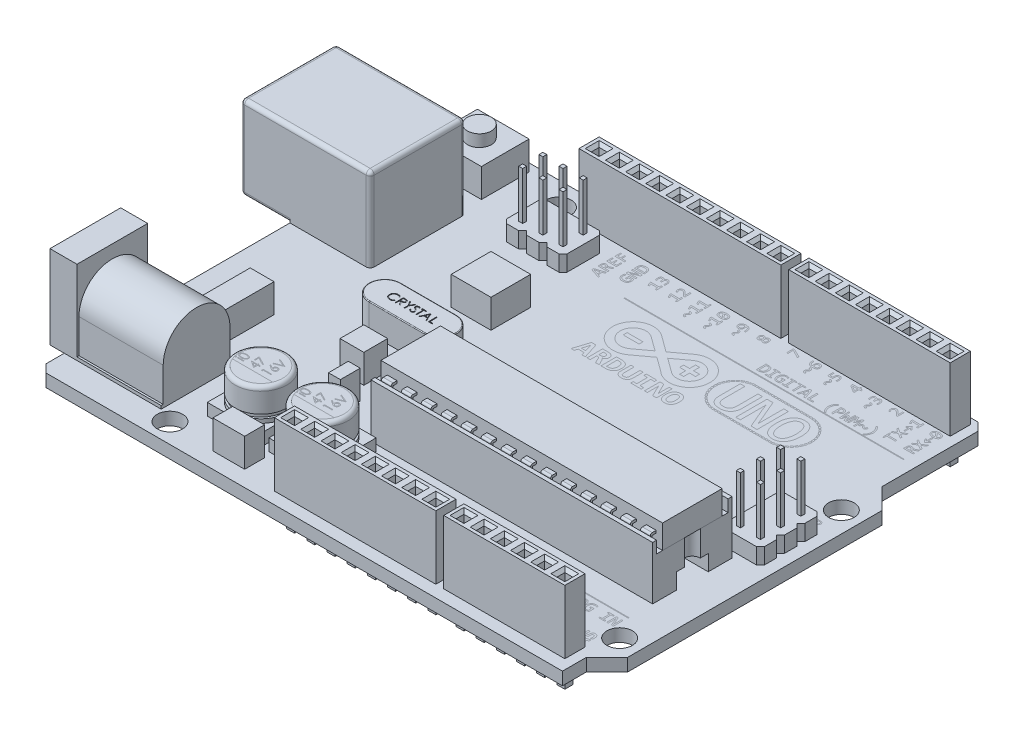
SolidWorks part; units mm, degrees
ref_plane "Alzado" through (0, 0, 0) normal (0, 0, 1) x (1, 0, 0)
ref_plane "Planta" through (0, 0, 0) normal (0, 1, 0) x (1, 0, 0)
ref_plane "Vista lateral" through (0, 0, 0) normal (1, 0, 0) x (0, 0, -1)
sketch "Croquis1" plane through (0, 0, 0) normal (0, 1, 0) x (1, 0, 0)
  line L0 (33.0093, 11.5953) -> (33.0093, -20.4047)
  line L1 (30.4093, -26.0047) -> (-34.5907, -26.0047)
  line L2 (30.4093, -26.0047) -> (30.4093, -23.0047)
  line L3 (29.4093, 27.2953) -> (-34.5907, 27.2953)
  line L4 (-35.5907, -25.0047) -> (-35.5907, 26.2953)
  line L5 (30.4093, -26.0047) -> (-35.5907, 27.2953) construction
  line L6 (30.4093, 27.2953) -> (-35.5907, -26.0047) construction
  line L7 (33.0093, -20.4047) -> (30.4093, -23.0047)
  line L8 (33.0093, 11.5953) -> (30.4093, 14.1953)
  line L9 (30.4093, 14.1953) -> (30.4093, 26.2953)
  line L10 (-34.5907, -26.0047) -> (-35.5907, -25.0047)
  line L11 (-35.5907, 26.2953) -> (-34.5907, 27.2953)
  line L12 (30.4093, 26.2953) -> (29.4093, 27.2953)
  circle A0 centre (-20.3907, 24.2953) radius 1.6
  circle A1 centre (-21.4907, -23.5047) radius 1.6
  circle A2 centre (30.4093, -18.8047) radius 1.6
  circle A3 centre (30.4093, 9.0953) radius 1.6
  point P0 (-2.5907, 0.6453)
  dimension "D13" = 3.2
  dimension "D1" = 66
  dimension "D2" = 53.3
  dimension "D3" = 68.6
  dimension "D4" = 32
  dimension "D5" = 45
  dimension "D6" = 3
  dimension "D7" = 1
  dimension "D8" = 1
  dimension "D9" = 1
  dimension "D10" = 1
  dimension "D11" = 1
  dimension "D12" = 1
  dimension "D14" = 27.9
  dimension "D15" = 4.7
  dimension "D16" = 50.8
  dimension "D17" = 51.9
  dimension "D18" = 1.1
  dimension "D19" = 15.2
  dimension "D20" = 2.5
extrude "Saliente-Extruir1" add sketch "Croquis1" along normal blind 1.6
sketch "Croquis3" plane through (0, 1.6, 0) normal (0, 1, 0) x (1, 0, 0)
  line L1 (-41.7907, 17.6953) -> (-25.4907, 17.6953)
  line L2 (-41.7907, 17.6953) -> (-41.7907, 5.6953)
  line L3 (-41.7907, 5.6953) -> (-25.4907, 5.6953)
  line L4 (-25.4907, 17.6953) -> (-25.4907, 5.6953)
  line L7 (-37.3907, -13.8047) -> (-23.3907, -13.8047)
  line L8 (-37.3907, -13.8047) -> (-37.3907, -22.7047)
  line L9 (-37.3907, -22.7047) -> (-23.3907, -22.7047)
  line L10 (-23.3907, -13.8047) -> (-23.3907, -22.7047)
  line L11 (-35.5907, 26.2953) -> (-35.5907, 17.6953) construction
  line L12 (-35.5907, 26.2953) -> (-34.5907, 27.2953) construction
  dimension "D1" = 16.3
  dimension "D2" = 12
  dimension "D5" = 8.9
  dimension "D6" = 14
extrude "Saliente-Extruir2" add sketch "Croquis3" along normal blind 10.5
sketch "Croquis4" plane through (-41.7907, 0, 0) normal (-1, 0, 0) x (0, 0, 1)
  line L0 (-11.6953, 12.1) -> (-11.6953, 1.6) construction
  line L1 (-7.1953, 3.1) -> (-16.1953, 3.1)
  line L2 (-16.1953, 3.1) -> (-16.1953, 8.1)
  line L3 (-16.1953, 8.1) -> (-14.9953, 10.6)
  line L4 (-14.9953, 10.6) -> (-8.3953, 10.6)
  line L5 (-8.3953, 8.1) -> (-14.9953, 8.1)
  line L6 (-14.9953, 8.1) -> (-14.9953, 5.6)
  line L7 (-14.9953, 5.6) -> (-8.3953, 5.6)
  line L8 (-8.3953, 8.1) -> (-8.3953, 5.6)
  line L9 (-7.1953, 8.1) -> (-8.3953, 10.6)
  line L10 (-7.1953, 3.1) -> (-7.1953, 8.1)
  line L11 (-11.6953, 12.1) -> (-17.6953, 12.1) construction
  point P11 (-11.6953, 5.6)
  point P12 (-11.6953, 8.1)
  point P13 (-11.6953, 10.6)
  point P15 (-11.6953, 3.1)
  dimension "D1" = 2.5
  dimension "D2" = 7.5
  dimension "D3" = 9
  dimension "D4" = 2.5
  dimension "D5" = 1.2
  dimension "D6" = 1.2
extrude "Cortar-Extruir1" cut sketch "Croquis4" against normal blind 10
sketch "Croquis5" plane through (-37.3907, 0, 0) normal (-1, 0, 0) x (0, 0, 1)
  line L0 (18.2547, 6.85) -> (13.8047, 6.85) construction
  line L1 (18.2547, 6.85) -> (18.2547, 12.1) construction
  circle A0 centre (18.2547, 6.85) radius 3.5
  circle A1 centre (18.2547, 6.85) radius 0.5
  dimension "D1" = 7
  dimension "D2" = 1
extrude "Cortar-Extruir2" cut sketch "Croquis5" against normal blind 10
sketch "Croquis6" plane through (-23.3907, 0, 0) normal (1, 0, 0) x (0, 0, -1)
  line L0 (-18.2547, 12.1) -> (-18.2547, 1.6) construction
  line L1 (-22.4547, 6.267) -> (-22.4547, 2)
  line L2 (-22.7047, 2) -> (-22.7047, 12.1)
  line L3 (-22.7047, 12.1) -> (-13.8047, 12.1)
  line L4 (-13.8047, 2) -> (-13.8047, 12.1)
  line L5 (-22.4547, 2) -> (-22.7047, 2)
  line L6 (-14.0547, 2) -> (-13.8047, 2)
  line L7 (-14.0547, 6.267) -> (-14.0547, 2)
  arc A0 (-14.0547, 6.267) -> (-22.4547, 6.267) centre (-18.2547, 6.267) ccw
  dimension "D1" = 0.25
  dimension "D2" = 4.667
extrude "Cortar-Extruir3" cut sketch "Croquis6" against normal blind 10.6
sketch "Croquis7" plane through (0, 1.6, 0) normal (0, 1, 0) x (1, 0, 0)
  line L0 (-17.5108, 25.2653) -> (29.2092, 25.2653) construction
  line L1 (-17.5108, 26.5353) -> (7.8892, 26.5353)
  line L2 (-17.5108, 26.5353) -> (-17.5108, 23.9953)
  line L3 (-17.5108, 23.9953) -> (7.8892, 23.9953)
  line L4 (7.8892, 26.5353) -> (7.8892, 23.9953)
  line L5 (8.8892, 26.5353) -> (29.2092, 26.5353)
  line L6 (8.8892, 26.5353) -> (8.8892, 23.9953)
  line L7 (8.8892, 23.9953) -> (29.2092, 23.9953)
  line L8 (29.2092, 26.5353) -> (29.2092, 23.9953)
  line L9 (24.8992, 24.7653) -> (25.8992, 24.7653)
  line L10 (27.4392, 24.7653) -> (28.4392, 24.7653)
  line L11 (27.4392, 24.7653) -> (27.4392, 25.7653)
  line L12 (27.4392, 25.7653) -> (28.4392, 25.7653)
  line L13 (28.4392, 24.7653) -> (28.4392, 25.7653)
  line L14 (27.4392, 24.7653) -> (28.4392, 25.7653) construction
  line L15 (27.4392, 25.7653) -> (28.4392, 24.7653) construction
  line L16 (24.8992, 24.7653) -> (24.8992, 25.7653)
  line L17 (24.8992, 25.7653) -> (25.8992, 25.7653)
  line L18 (25.8992, 24.7653) -> (25.8992, 25.7653)
  line L19 (24.8992, 24.7653) -> (25.8992, 25.7653) construction
  line L20 (24.8992, 25.7653) -> (25.8992, 24.7653) construction
  line L21 (22.3592, 24.7653) -> (23.3592, 24.7653)
  line L22 (22.3592, 24.7653) -> (22.3592, 25.7653)
  line L23 (22.3592, 25.7653) -> (23.3592, 25.7653)
  line L24 (23.3592, 24.7653) -> (23.3592, 25.7653)
  line L25 (22.3592, 24.7653) -> (23.3592, 25.7653) construction
  line L26 (22.3592, 25.7653) -> (23.3592, 24.7653) construction
  line L27 (19.8192, 24.7653) -> (20.8192, 24.7653)
  line L28 (19.8192, 24.7653) -> (19.8192, 25.7653)
  line L29 (19.8192, 25.7653) -> (20.8192, 25.7653)
  line L30 (20.8192, 24.7653) -> (20.8192, 25.7653)
  line L31 (19.8192, 24.7653) -> (20.8192, 25.7653) construction
  line L32 (19.8192, 25.7653) -> (20.8192, 24.7653) construction
  line L33 (17.2792, 24.7653) -> (18.2792, 24.7653)
  line L34 (17.2792, 24.7653) -> (17.2792, 25.7653)
  line L35 (17.2792, 25.7653) -> (18.2792, 25.7653)
  line L36 (18.2792, 24.7653) -> (18.2792, 25.7653)
  line L37 (17.2792, 24.7653) -> (18.2792, 25.7653) construction
  line L38 (17.2792, 25.7653) -> (18.2792, 24.7653) construction
  line L39 (14.7392, 24.7653) -> (15.7392, 24.7653)
  line L40 (14.7392, 24.7653) -> (14.7392, 25.7653)
  line L41 (14.7392, 25.7653) -> (15.7392, 25.7653)
  line L42 (15.7392, 24.7653) -> (15.7392, 25.7653)
  line L43 (14.7392, 24.7653) -> (15.7392, 25.7653) construction
  line L44 (14.7392, 25.7653) -> (15.7392, 24.7653) construction
  line L45 (12.1992, 24.7653) -> (13.1992, 24.7653)
  line L46 (12.1992, 24.7653) -> (12.1992, 25.7653)
  line L47 (12.1992, 25.7653) -> (13.1992, 25.7653)
  line L48 (13.1992, 24.7653) -> (13.1992, 25.7653)
  line L49 (12.1992, 24.7653) -> (13.1992, 25.7653) construction
  line L50 (12.1992, 25.7653) -> (13.1992, 24.7653) construction
  line L51 (9.6592, 24.7653) -> (10.6592, 24.7653)
  line L52 (9.6592, 24.7653) -> (9.6592, 25.7653)
  line L53 (9.6592, 25.7653) -> (10.6592, 25.7653)
  line L54 (10.6592, 24.7653) -> (10.6592, 25.7653)
  line L55 (9.6592, 24.7653) -> (10.6592, 25.7653) construction
  line L56 (9.6592, 25.7653) -> (10.6592, 24.7653) construction
  line L57 (3.5792, 24.7653) -> (4.5792, 24.7653)
  line L58 (6.1192, 24.7653) -> (7.1192, 24.7653)
  line L59 (6.1192, 24.7653) -> (6.1192, 25.7653)
  line L60 (6.1192, 25.7653) -> (7.1192, 25.7653)
  line L61 (7.1192, 24.7653) -> (7.1192, 25.7653)
  line L62 (6.1192, 24.7653) -> (7.1192, 25.7653) construction
  line L63 (6.1192, 25.7653) -> (7.1192, 24.7653) construction
  line L64 (3.5792, 24.7653) -> (3.5792, 25.7653)
  line L65 (3.5792, 25.7653) -> (4.5792, 25.7653)
  line L66 (4.5792, 24.7653) -> (4.5792, 25.7653)
  line L67 (3.5792, 24.7653) -> (4.5792, 25.7653) construction
  line L68 (3.5792, 25.7653) -> (4.5792, 24.7653) construction
  line L69 (1.0392, 24.7653) -> (2.0392, 24.7653)
  line L70 (1.0392, 24.7653) -> (1.0392, 25.7653)
  line L71 (1.0392, 25.7653) -> (2.0392, 25.7653)
  line L72 (2.0392, 24.7653) -> (2.0392, 25.7653)
  line L73 (-7.3508, -23.2347) -> (29.2092, -23.2347) construction
  line L74 (29.2092, -24.5047) -> (13.9692, -24.5047)
  line L75 (29.2092, -24.5047) -> (29.2092, -21.9647)
  line L76 (29.2092, -21.9647) -> (13.9692, -21.9647)
  line L77 (13.9692, -24.5047) -> (13.9692, -21.9647)
  line L78 (12.9692, -21.9647) -> (-7.3508, -21.9647)
  line L79 (12.9692, -21.9647) -> (12.9692, -24.5047)
  line L80 (12.9692, -24.5047) -> (-7.3508, -24.5047)
  line L81 (-7.3508, -21.9647) -> (-7.3508, -24.5047)
  line L82 (9.6592, -23.7347) -> (8.6592, -23.7347)
  line L83 (9.6592, -23.7347) -> (9.6592, -22.7347)
  line L84 (9.6592, -22.7347) -> (8.6592, -22.7347)
  line L85 (8.6592, -23.7347) -> (8.6592, -22.7347)
  line L86 (9.6592, -23.7347) -> (8.6592, -22.7347) construction
  line L87 (9.6592, -22.7347) -> (8.6592, -23.7347) construction
  line L88 (7.1192, -23.7347) -> (6.1192, -23.7347)
  line L89 (15.7392, -23.7347) -> (14.7392, -23.7347)
  line L90 (15.7392, -23.7347) -> (15.7392, -22.7347)
  line L91 (15.7392, -22.7347) -> (14.7392, -22.7347)
  line L92 (14.7392, -23.7347) -> (14.7392, -22.7347)
  line L93 (15.7392, -23.7347) -> (14.7392, -22.7347) construction
  line L94 (15.7392, -22.7347) -> (14.7392, -23.7347) construction
  line L95 (7.1192, -23.7347) -> (7.1192, -22.7347)
  line L96 (7.1192, -22.7347) -> (6.1192, -22.7347)
  line L97 (6.1192, -23.7347) -> (6.1192, -22.7347)
  line L98 (7.1192, -23.7347) -> (6.1192, -22.7347) construction
  line L99 (7.1192, -22.7347) -> (6.1192, -23.7347) construction
  line L100 (18.2792, -23.7347) -> (17.2792, -23.7347)
  line L101 (18.2792, -23.7347) -> (18.2792, -22.7347)
  line L102 (18.2792, -22.7347) -> (17.2792, -22.7347)
  line L103 (17.2792, -23.7347) -> (17.2792, -22.7347)
  line L104 (18.2792, -23.7347) -> (17.2792, -22.7347) construction
  line L105 (18.2792, -22.7347) -> (17.2792, -23.7347) construction
  line L106 (4.5792, -23.7347) -> (3.5792, -23.7347)
  line L107 (4.5792, -23.7347) -> (4.5792, -22.7347)
  line L108 (4.5792, -22.7347) -> (3.5792, -22.7347)
  line L109 (3.5792, -23.7347) -> (3.5792, -22.7347)
  line L110 (4.5792, -23.7347) -> (3.5792, -22.7347) construction
  line L111 (4.5792, -22.7347) -> (3.5792, -23.7347) construction
  line L112 (20.8192, -23.7347) -> (19.8192, -23.7347)
  line L113 (20.8192, -23.7347) -> (20.8192, -22.7347)
  line L114 (20.8192, -22.7347) -> (19.8192, -22.7347)
  line L115 (19.8192, -23.7347) -> (19.8192, -22.7347)
  line L116 (20.8192, -23.7347) -> (19.8192, -22.7347) construction
  line L117 (20.8192, -22.7347) -> (19.8192, -23.7347) construction
  line L118 (2.0392, -23.7347) -> (1.0392, -23.7347)
  line L119 (2.0392, -23.7347) -> (2.0392, -22.7347)
  line L120 (2.0392, -22.7347) -> (1.0392, -22.7347)
  line L121 (1.0392, -23.7347) -> (1.0392, -22.7347)
  line L122 (2.0392, -23.7347) -> (1.0392, -22.7347) construction
  line L123 (2.0392, -22.7347) -> (1.0392, -23.7347) construction
  line L124 (23.3592, -23.7347) -> (22.3592, -23.7347)
  line L125 (23.3592, -23.7347) -> (23.3592, -22.7347)
  line L126 (23.3592, -22.7347) -> (22.3592, -22.7347)
  line L127 (22.3592, -23.7347) -> (22.3592, -22.7347)
  line L128 (23.3592, -23.7347) -> (22.3592, -22.7347) construction
  line L129 (23.3592, -22.7347) -> (22.3592, -23.7347) construction
  line L130 (-0.5008, -23.7347) -> (-1.5008, -23.7347)
  line L131 (-0.5008, -23.7347) -> (-0.5008, -22.7347)
  line L132 (-0.5008, -22.7347) -> (-1.5008, -22.7347)
  line L133 (-1.5008, -23.7347) -> (-1.5008, -22.7347)
  line L134 (-0.5008, -23.7347) -> (-1.5008, -22.7347) construction
  line L135 (-0.5008, -22.7347) -> (-1.5008, -23.7347) construction
  line L136 (25.8992, -23.7347) -> (24.8992, -23.7347)
  line L137 (25.8992, -23.7347) -> (25.8992, -22.7347)
  line L138 (25.8992, -22.7347) -> (24.8992, -22.7347)
  line L139 (24.8992, -23.7347) -> (24.8992, -22.7347)
  line L140 (25.8992, -23.7347) -> (24.8992, -22.7347) construction
  line L141 (25.8992, -22.7347) -> (24.8992, -23.7347) construction
  line L142 (12.1992, -23.7347) -> (11.1992, -23.7347)
  line L143 (12.1992, -23.7347) -> (12.1992, -22.7347)
  line L144 (12.1992, -22.7347) -> (11.1992, -22.7347)
  line L145 (11.1992, -23.7347) -> (11.1992, -22.7347)
  line L146 (12.1992, -23.7347) -> (11.1992, -22.7347) construction
  line L147 (12.1992, -22.7347) -> (11.1992, -23.7347) construction
  line L148 (28.4392, -23.7347) -> (27.4392, -23.7347)
  line L149 (28.4392, -23.7347) -> (28.4392, -22.7347)
  line L150 (28.4392, -22.7347) -> (27.4392, -22.7347)
  line L151 (27.4392, -23.7347) -> (27.4392, -22.7347)
  line L152 (28.4392, -23.7347) -> (27.4392, -22.7347) construction
  line L153 (28.4392, -22.7347) -> (27.4392, -23.7347) construction
  line L154 (1.0392, 24.7653) -> (2.0392, 25.7653) construction
  line L155 (-3.0408, -23.7347) -> (-4.0408, -23.7347)
  line L156 (-3.0408, -23.7347) -> (-3.0408, -22.7347)
  line L157 (-3.0408, -22.7347) -> (-4.0408, -22.7347)
  line L158 (-4.0408, -23.7347) -> (-4.0408, -22.7347)
  line L159 (-3.0408, -23.7347) -> (-4.0408, -22.7347) construction
  line L160 (-3.0408, -22.7347) -> (-4.0408, -23.7347) construction
  line L161 (-5.5808, -23.7347) -> (-6.5808, -23.7347)
  line L162 (-5.5808, -23.7347) -> (-5.5808, -22.7347)
  line L163 (-5.5808, -22.7347) -> (-6.5808, -22.7347)
  line L164 (-6.5808, -23.7347) -> (-6.5808, -22.7347)
  line L165 (-5.5808, -23.7347) -> (-6.5808, -22.7347) construction
  line L166 (-5.5808, -22.7347) -> (-6.5808, -23.7347) construction
  line L167 (1.0392, 25.7653) -> (2.0392, 24.7653) construction
  line L168 (-1.5008, 24.7653) -> (-0.5008, 24.7653)
  line L169 (-1.5008, 24.7653) -> (-1.5008, 25.7653)
  line L170 (-1.5008, 25.7653) -> (-0.5008, 25.7653)
  line L171 (-0.5008, 24.7653) -> (-0.5008, 25.7653)
  line L172 (-1.5008, 24.7653) -> (-0.5008, 25.7653) construction
  line L173 (-1.5008, 25.7653) -> (-0.5008, 24.7653) construction
  line L174 (-4.0408, 24.7653) -> (-3.0408, 24.7653)
  line L175 (-4.0408, 24.7653) -> (-4.0408, 25.7653)
  line L176 (-4.0408, 25.7653) -> (-3.0408, 25.7653)
  line L177 (-3.0408, 24.7653) -> (-3.0408, 25.7653)
  line L178 (-4.0408, 24.7653) -> (-3.0408, 25.7653) construction
  line L179 (-4.0408, 25.7653) -> (-3.0408, 24.7653) construction
  line L180 (-6.5808, 24.7653) -> (-5.5808, 24.7653)
  line L181 (-6.5808, 24.7653) -> (-6.5808, 25.7653)
  line L182 (-6.5808, 25.7653) -> (-5.5808, 25.7653)
  line L183 (-5.5808, 24.7653) -> (-5.5808, 25.7653)
  line L184 (-6.5808, 24.7653) -> (-5.5808, 25.7653) construction
  line L185 (-6.5808, 25.7653) -> (-5.5808, 24.7653) construction
  line L186 (-9.1208, 24.7653) -> (-8.1208, 24.7653)
  line L187 (-9.1208, 24.7653) -> (-9.1208, 25.7653)
  line L188 (-9.1208, 25.7653) -> (-8.1208, 25.7653)
  line L189 (-8.1208, 24.7653) -> (-8.1208, 25.7653)
  line L190 (-9.1208, 24.7653) -> (-8.1208, 25.7653) construction
  line L191 (-9.1208, 25.7653) -> (-8.1208, 24.7653) construction
  line L192 (-11.6608, 24.7653) -> (-10.6608, 24.7653)
  line L193 (-11.6608, 24.7653) -> (-11.6608, 25.7653)
  line L194 (-11.6608, 25.7653) -> (-10.6608, 25.7653)
  line L195 (-10.6608, 24.7653) -> (-10.6608, 25.7653)
  line L196 (-11.6608, 24.7653) -> (-10.6608, 25.7653) construction
  line L197 (-11.6608, 25.7653) -> (-10.6608, 24.7653) construction
  line L198 (-14.2008, 24.7653) -> (-13.2008, 24.7653)
  line L199 (-14.2008, 24.7653) -> (-14.2008, 25.7653)
  line L200 (-14.2008, 25.7653) -> (-13.2008, 25.7653)
  line L201 (-13.2008, 24.7653) -> (-13.2008, 25.7653)
  line L202 (-14.2008, 24.7653) -> (-13.2008, 25.7653) construction
  line L203 (-14.2008, 25.7653) -> (-13.2008, 24.7653) construction
  line L204 (-16.7408, 24.7653) -> (-15.7408, 24.7653)
  line L205 (-16.7408, 24.7653) -> (-16.7408, 25.7653)
  line L206 (-16.7408, 25.7653) -> (-15.7408, 25.7653)
  line L207 (-15.7408, 24.7653) -> (-15.7408, 25.7653)
  line L208 (-16.7408, 24.7653) -> (-15.7408, 25.7653) construction
  line L209 (-16.7408, 25.7653) -> (-15.7408, 24.7653) construction
  line L210 (29.2092, -24.5047) -> (30.4093, -24.5047) construction
  line L211 (30.4093, -24.5047) -> (30.4093, -26.0047) construction
  point P8 (27.9392, 25.2653)
  point P13 (6.6192, 25.2653)
  point P14 (25.3992, 25.2653)
  point P23 (22.8592, 25.2653)
  point P28 (20.3192, 25.2653)
  point P33 (17.7792, 25.2653)
  point P38 (15.2392, 25.2653)
  point P43 (12.6992, 25.2653)
  point P48 (10.1592, 25.2653)
  point P59 (4.0792, 25.2653)
  point P64 (1.5392, 25.2653)
  point P69 (-1.0008, 25.2653)
  point P74 (-3.5408, 25.2653)
  point P86 (15.2392, -23.2347)
  point P91 (9.1592, -23.2347)
  point P96 (17.7792, -23.2347)
  point P101 (6.6192, -23.2347)
  point P106 (20.3192, -23.2347)
  point P111 (4.0792, -23.2347)
  point P116 (22.8592, -23.2347)
  point P121 (1.5392, -23.2347)
  point P126 (25.3992, -23.2347)
  point P131 (11.6992, -23.2347)
  point P136 (27.9392, -23.2347)
  point P141 (-1.0008, -23.2347)
  point P143 (-6.0808, 25.2653)
  point P148 (-3.5408, -23.2347)
  point P153 (-6.0808, -23.2347)
  point P162 (-8.6208, 25.2653)
  point P167 (-11.1608, 25.2653)
  point P172 (-13.7008, 25.2653)
  point P177 (-16.2408, 25.2653)
  dimension "D1" = 1
  dimension "D2" = 1
  dimension "D3" = 2.54
  dimension "D4" = 1.27
  dimension "D5" = 1.27
  dimension "D6" = 48.5
  dimension "D7" = 1.27
  dimension "D8" = 1
  dimension "D9" = 1.27
  dimension "D10" = 2.54
  dimension "D11" = 2.54
  dimension "D12" = 1.27
  dimension "D13" = 2.54
  dimension "D14" = 1.27
  dimension "D15" = 1.27
  dimension "D16" = 2.54
extrude "Saliente-Extruir3" add sketch "Croquis7" along normal blind 8
sketch "Croquis8" plane through (0, 1.6, 0) normal (0, 1, 0) x (1, 0, 0)
  line L0 (-19.7407, -20.5547) -> (-19.7407, -26.0047) construction
  line L1 (-5.2407, -20.5547) -> (-11.9907, -20.5547)
  line L2 (-5.2407, -20.5547) -> (-5.2407, -13.8047)
  line L3 (-5.2407, -13.8047) -> (-11.9907, -13.8047)
  line L4 (-11.9907, -20.5547) -> (-11.9907, -13.8047)
  line L5 (-5.2407, -20.5547) -> (-11.9907, -13.8047) construction
  line L6 (-5.2407, -13.8047) -> (-11.9907, -20.5547) construction
  line L7 (-12.9907, -20.5547) -> (-19.7407, -20.5547)
  line L8 (-12.9907, -20.5547) -> (-12.9907, -13.8047)
  line L9 (-12.9907, -13.8047) -> (-19.7407, -13.8047)
  line L10 (-19.7407, -20.5547) -> (-19.7407, -13.8047)
  line L11 (-12.9907, -20.5547) -> (-19.7407, -13.8047) construction
  line L12 (-12.9907, -13.8047) -> (-19.7407, -20.5547) construction
  line L13 (-19.7407, -26.0047) -> (-34.5907, -26.0047) construction
  point P0 (-8.6157, -17.1797)
  point P5 (-16.3657, -17.1797)
  dimension "D1" = 6.75
  dimension "D2" = 1
extrude "Saliente-Extruir4" add sketch "Croquis8" along normal blind 1.5
sketch "Croquis9" plane through (0, 3.1, 0) normal (0, 1, 0) x (1, 0, 0)
  line L0 (-16.3657, -13.8047) -> (-16.3657, -17.1797) construction
  line L1 (-19.7407, -17.1797) -> (-16.3657, -17.1797) construction
  line L2 (-8.6157, -13.8047) -> (-8.6157, -17.1797) construction
  circle A0 centre (-8.6157, -17.1797) radius 3.25
  circle A1 centre (-16.3657, -17.1797) radius 3.25
  dimension "D1" = 6.5
extrude "Saliente-Extruir5" add sketch "Croquis9" along normal blind 4
sketch "Croquis10" plane through (0, 1.6, 0) normal (0, 1, 0) x (1, 0, 0)
  line L0 (-19.9007, 22.3353) -> (-20.4007, 21.8353)
  line L1 (-18.3607, 17.2553) -> (-19.9007, 17.2553)
  line L2 (-18.3607, 22.3353) -> (-19.9007, 22.3353)
  line L3 (-20.4007, 17.7553) -> (-20.4007, 21.8353)
  line L4 (-20.4007, 19.7953) -> (-12.7807, 19.7953) construction
  line L5 (-16.5907, 22.3353) -> (-16.5907, 17.2553) construction
  line L6 (-17.8607, 21.8353) -> (-18.3607, 22.3353)
  line L7 (-18.3607, 17.2553) -> (-17.8607, 17.7553)
  line L8 (-19.9007, 17.2553) -> (-20.4007, 17.7553)
  line L9 (-17.3607, 22.3353) -> (-17.8607, 21.8353)
  line L10 (-15.8207, 17.2553) -> (-17.3607, 17.2553)
  line L11 (-15.8207, 22.3353) -> (-17.3607, 22.3353)
  line L12 (26.9693, 5.3953) -> (26.4693, 4.8953)
  line L13 (-20.4007, 19.7953) -> (-35.5907, 19.7953) construction
  line L14 (-35.5907, 19.7953) -> (-35.5907, 26.2953) construction
  line L15 (-15.3207, 21.8353) -> (-15.8207, 22.3353)
  line L16 (-15.8207, 17.2553) -> (-15.3207, 17.7553)
  line L17 (-17.3607, 17.2553) -> (-17.8607, 17.7553)
  line L18 (-14.8207, 22.3353) -> (-15.3207, 21.8353)
  line L19 (-13.2807, 17.2553) -> (-14.8207, 17.2553)
  line L20 (-12.7807, 17.7553) -> (-12.7807, 21.8353)
  line L21 (-13.2807, 22.3353) -> (-14.8207, 22.3353)
  line L22 (26.9693, 2.8553) -> (31.0493, 2.8553) construction
  line L23 (-12.7807, 21.8353) -> (-13.2807, 22.3353)
  line L24 (-13.2807, 17.2553) -> (-12.7807, 17.7553)
  line L25 (-14.8207, 17.2553) -> (-15.3207, 17.7553)
  line L26 (31.5493, 3.3553) -> (31.5493, 4.8953)
  line L27 (31.0493, 5.3953) -> (26.9693, 5.3953)
  line L28 (26.4693, 3.3553) -> (26.4693, 4.8953)
  line L29 (29.0093, 5.3953) -> (29.0093, -2.2247) construction
  line L30 (26.9693, 2.8553) -> (26.4693, 3.3553)
  line L31 (31.5493, 3.3553) -> (31.0493, 2.8553)
  line L32 (31.5493, 4.8953) -> (31.0493, 5.3953)
  line L33 (26.9693, 2.8553) -> (26.4693, 2.3553)
  line L34 (26.9693, 0.3153) -> (31.0493, 0.3153) construction
  line L35 (31.5493, 0.8153) -> (31.5493, 2.3553)
  line L36 (-17.8607, 21.8353) -> (-17.8607, 17.7553) construction
  line L37 (26.4693, 0.8153) -> (26.4693, 2.3553)
  line L38 (-15.3207, 21.8353) -> (-15.3207, 17.7553) construction
  line L39 (-20.4007, 21.8353) -> (-12.7807, 21.8353) construction
  line L40 (26.9693, 0.3153) -> (26.4693, 0.8153)
  line L41 (31.5493, 0.8153) -> (31.0493, 0.3153)
  line L42 (31.5493, 2.3553) -> (31.0493, 2.8553)
  line L43 (26.9693, 0.3153) -> (26.4693, -0.1847)
  line L44 (31.0493, -2.2247) -> (26.9693, -2.2247)
  line L45 (31.5493, -1.7247) -> (31.5493, -0.1847)
  line L46 (-12.7807, 17.7553) -> (-20.4007, 17.7553) construction
  line L47 (26.4693, -1.7247) -> (26.4693, -0.1847)
  line L48 (26.9693, -2.2247) -> (26.4693, -1.7247)
  line L49 (31.5493, -1.7247) -> (31.0493, -2.2247)
  line L50 (31.5493, -0.1847) -> (31.0493, 0.3153)
  point P13 (-16.5907, 19.7953)
  dimension "D1" = 5.08
  dimension "D2" = 7.62
  dimension "D3" = 5.08
  dimension "D4" = 2.54
  dimension "D5" = 2.54
  dimension "D6" = 0.5
  dimension "D7" = 0.5
  dimension "D8" = 7.62
  dimension "D9" = 0.5
  dimension "D10" = 0.5
extrude "Saliente-Extruir6" add sketch "Croquis10" along normal blind 2
sketch "Croquis11" plane through (0, 3.6, 0) normal (0, 1, 0) x (1, 0, 0)
  line L0 (-19.1307, 22.3353) -> (-19.1307, 17.2553) construction
  line L1 (-18.8807, 20.8153) -> (-19.3807, 20.8153)
  line L2 (-18.8807, 20.8153) -> (-18.8807, 21.3153)
  line L3 (-18.8807, 21.3153) -> (-19.3807, 21.3153)
  line L4 (-19.3807, 20.8153) -> (-19.3807, 21.3153)
  line L5 (-18.8807, 20.8153) -> (-19.3807, 21.3153) construction
  line L6 (-18.8807, 21.3153) -> (-19.3807, 20.8153) construction
  line L7 (-18.8807, 18.2753) -> (-19.3807, 18.7753) construction
  line L8 (-18.8807, 18.7753) -> (-19.3807, 18.2753) construction
  line L9 (-19.3807, 18.7753) -> (-19.3807, 18.2753)
  line L10 (-18.8807, 18.2753) -> (-19.3807, 18.2753)
  line L11 (-18.8807, 18.7753) -> (-18.8807, 18.2753)
  line L12 (-18.8807, 18.7753) -> (-19.3807, 18.7753)
  line L13 (-20.4007, 19.7953) -> (-12.7807, 19.7953) construction
  line L14 (-16.3407, 20.8153) -> (-16.8407, 20.8153)
  line L15 (-16.3407, 20.8153) -> (-16.3407, 21.3153)
  line L16 (-16.3407, 21.3153) -> (-16.8407, 21.3153)
  line L17 (-16.8407, 20.8153) -> (-16.8407, 21.3153)
  line L18 (-16.8407, 18.7753) -> (-16.8407, 18.2753)
  line L19 (-16.3407, 18.2753) -> (-16.8407, 18.2753)
  line L20 (-16.3407, 18.7753) -> (-16.3407, 18.2753)
  line L21 (-16.3407, 18.7753) -> (-16.8407, 18.7753)
  line L22 (-16.3407, 20.8153) -> (-16.8407, 21.3153) construction
  line L23 (-16.3407, 21.3153) -> (-16.8407, 20.8153) construction
  line L24 (-16.3407, 18.2753) -> (-16.8407, 18.7753) construction
  line L25 (-16.3407, 18.7753) -> (-16.8407, 18.2753) construction
  line L26 (-13.8007, 20.8153) -> (-14.3007, 20.8153)
  line L27 (-13.8007, 20.8153) -> (-13.8007, 21.3153)
  line L28 (-13.8007, 21.3153) -> (-14.3007, 21.3153)
  line L29 (-14.3007, 20.8153) -> (-14.3007, 21.3153)
  line L30 (-14.3007, 18.7753) -> (-14.3007, 18.2753)
  line L31 (-13.8007, 18.2753) -> (-14.3007, 18.2753)
  line L32 (-13.8007, 18.7753) -> (-13.8007, 18.2753)
  line L33 (-13.8007, 18.7753) -> (-14.3007, 18.7753)
  line L34 (-13.8007, 20.8153) -> (-14.3007, 21.3153) construction
  line L35 (-13.8007, 21.3153) -> (-14.3007, 20.8153) construction
  line L36 (-13.8007, 18.2753) -> (-14.3007, 18.7753) construction
  line L37 (-13.8007, 18.7753) -> (-14.3007, 18.2753) construction
  line L38 (29.0093, 5.3953) -> (29.0093, -2.2247) construction
  line L39 (31.5493, 4.1253) -> (26.4693, 4.1253) construction
  line L40 (27.4893, 4.3753) -> (27.9893, 3.8753) construction
  line L41 (30.5293, 3.8753) -> (30.0293, 3.8753)
  line L42 (30.5293, 3.8753) -> (30.5293, 4.3753)
  line L43 (30.5293, 4.3753) -> (30.0293, 4.3753)
  line L44 (30.0293, 3.8753) -> (30.0293, 4.3753)
  line L45 (30.5293, 3.8753) -> (30.0293, 4.3753) construction
  line L46 (30.5293, 4.3753) -> (30.0293, 3.8753) construction
  line L47 (27.4893, 3.8753) -> (27.9893, 4.3753) construction
  line L48 (27.9893, 3.8753) -> (27.9893, 4.3753)
  line L49 (27.4893, 4.3753) -> (27.9893, 4.3753)
  line L50 (27.4893, 3.8753) -> (27.4893, 4.3753)
  line L51 (27.4893, 3.8753) -> (27.9893, 3.8753)
  line L52 (30.5293, 1.3353) -> (30.0293, 1.3353)
  line L53 (30.5293, 1.3353) -> (30.5293, 1.8353)
  line L54 (30.5293, 1.8353) -> (30.0293, 1.8353)
  line L55 (30.0293, 1.3353) -> (30.0293, 1.8353)
  line L56 (27.9893, 1.3353) -> (27.9893, 1.8353)
  line L57 (27.4893, 1.8353) -> (27.9893, 1.8353)
  line L58 (27.4893, 1.3353) -> (27.4893, 1.8353)
  line L59 (27.4893, 1.3353) -> (27.9893, 1.3353)
  line L60 (27.4893, 1.8353) -> (27.9893, 1.3353) construction
  line L61 (30.5293, 1.3353) -> (30.0293, 1.8353) construction
  line L62 (30.5293, 1.8353) -> (30.0293, 1.3353) construction
  line L63 (27.4893, 1.3353) -> (27.9893, 1.8353) construction
  line L64 (30.5293, -1.2047) -> (30.0293, -1.2047)
  line L65 (30.5293, -1.2047) -> (30.5293, -0.7047)
  line L66 (30.5293, -0.7047) -> (30.0293, -0.7047)
  line L67 (30.0293, -1.2047) -> (30.0293, -0.7047)
  line L68 (27.9893, -1.2047) -> (27.9893, -0.7047)
  line L69 (27.4893, -0.7047) -> (27.9893, -0.7047)
  line L70 (27.4893, -1.2047) -> (27.4893, -0.7047)
  line L71 (27.4893, -1.2047) -> (27.9893, -1.2047)
  line L72 (27.4893, -0.7047) -> (27.9893, -1.2047) construction
  line L73 (30.5293, -1.2047) -> (30.0293, -0.7047) construction
  line L74 (30.5293, -0.7047) -> (30.0293, -1.2047) construction
  line L75 (27.4893, -1.2047) -> (27.9893, -0.7047) construction
  line L76 (27.7393, 4.1253) -> (27.7393, -0.9547) construction
  line L77 (-19.1307, 18.5253) -> (-14.0507, 18.5253) construction
  line L78 (30.5293, -1.2047) -> (30.5293, -2.2247) construction
  line L79 (30.5293, -2.2247) -> (31.0493, -2.2247) construction
  point P0 (-19.1307, 21.0653)
  point P9 (-19.1307, 18.5253)
  point P15 (-16.5907, 21.0653)
  point P24 (-16.5907, 18.5253)
  point P25 (-14.0507, 21.0653)
  point P34 (-14.0507, 18.5253)
  point P38 (30.2793, 4.1253)
  point P47 (27.7393, 4.1253)
  point P49 (30.2793, 1.5853)
  point P58 (27.7393, 1.5853)
  point P59 (30.2793, -0.9547)
  point P68 (27.7393, -0.9547)
  dimension "D1" = 0.5
  dimension "D2" = 2.54
  dimension "D3" = 0.5
  dimension "D4" = 2.54
  dimension "D5" = 2.54
  dimension "D6" = 2.54
extrude "Saliente-Extruir7" add sketch "Croquis11" along normal up to surface (6 mm away)
sketch "Croquis13" plane through (0, 1.6, 0) normal (0, 1, 0) x (1, 0, 0)
  line L0 (-2.5907, 0.6453) -> (-15.0907, 0.6453) construction
  line L1 (-20.5907, 2.6453) -> (-9.5907, 2.6453)
  line L2 (-20.5907, 2.6453) -> (-20.5907, -1.3547)
  line L3 (-20.5907, -1.3547) -> (-9.5907, -1.3547)
  line L4 (-9.5907, 2.6453) -> (-9.5907, -1.3547)
  line L5 (-20.5907, 2.6453) -> (-9.5907, -1.3547) construction
  line L6 (-20.5907, -1.3547) -> (-9.5907, 2.6453) construction
  line L7 (-20.5907, -1.3547) -> (-35.5907, -1.3547) construction
  line L8 (-35.5907, -1.3547) -> (-35.5907, -25.0047) construction
  point P0 (-15.0907, 0.6453)
  dimension "D1" = 4
  dimension "D2" = 11
extrude "Saliente-Extruir9" add sketch "Croquis13" along normal blind 3.5
ref_plane "Plano1" through (0, 4.1, 0) normal (0, 1, 0) x (1, 0, 0)
sketch "Croquis15" plane through (0, 4.1, 0) normal (0, 1, 0) x (1, 0, 0)
  circle A0 centre (-16.3657, -17.1797) radius 3.25
  circle A1 centre (-8.6157, -17.1797) radius 3.25
  circle A2 centre (-16.3657, -17.1797) radius 3
  circle A3 centre (-8.6157, -17.1797) radius 3
extrude "Cortar-Extruir5" cut sketch "Croquis15" against normal blind 0.5
sketch "Croquis16" plane through (0, 1.6, 0) normal (0, 1, 0) x (1, 0, 0)
  line L0 (-32.5907, 26.2953) -> (-26.0907, 26.2953)
  line L1 (-32.5907, 26.2953) -> (-32.5907, 20.2953)
  line L2 (-32.5907, 20.2953) -> (-26.0907, 20.2953)
  line L3 (-26.0907, 26.2953) -> (-26.0907, 20.2953)
  line L4 (-32.5907, 26.2953) -> (-35.5907, 26.2953) construction
  dimension "D1" = 6
  dimension "D2" = 6.5
extrude "Saliente-Extruir10" add sketch "Croquis16" along normal blind 3.6
sketch "Croquis17" plane through (0, 5.2, 0) normal (0, 1, 0) x (1, 0, 0)
  line L0 (-32.5907, 20.2953) -> (-26.0907, 26.2953) construction
  circle A0 centre (-29.3407, 23.2953) radius 1.5
extrude "Saliente-Extruir11" add sketch "Croquis17" along normal blind 1.5
sketch "Croquis18" plane through (0, 1.6, 0) normal (0, 1, 0) x (1, 0, 0)
  line L0 (-16.2407, 11.6453) -> (-11.2407, 11.6453)
  line L1 (-16.2407, 11.6453) -> (-16.2407, 6.6453)
  line L2 (-16.2407, 6.6453) -> (-11.2407, 6.6453)
  line L3 (-11.2407, 11.6453) -> (-11.2407, 6.6453)
  line L4 (-16.2407, -4.3547) -> (-13.2407, -4.3547)
  line L5 (-16.2407, -4.3547) -> (-16.2407, -7.3547)
  line L6 (-16.2407, -7.3547) -> (-13.2407, -7.3547)
  line L7 (-13.2407, -4.3547) -> (-13.2407, -7.3547)
  line L8 (-29.5907, -5.3047) -> (-26.5907, -5.3047)
  line L9 (-29.5907, -5.3047) -> (-29.5907, -11.8047)
  line L10 (-29.5907, -11.8047) -> (-26.5907, -11.8047)
  line L11 (-26.5907, -5.3047) -> (-26.5907, -11.8047)
  line L12 (-13.2407, -9.3047) -> (-11.7407, -9.3047)
  line L13 (-13.2407, -9.3047) -> (-13.2407, -11.8047)
  line L14 (-13.2407, -11.8047) -> (-11.7407, -11.8047)
  line L15 (-11.7407, -9.3047) -> (-11.7407, -11.8047)
  line L16 (-15.5907, -21.5047) -> (-11.5907, -21.5047)
  line L17 (-15.5907, -21.5047) -> (-15.5907, -24.0047)
  line L18 (-15.5907, -24.0047) -> (-11.5907, -24.0047)
  line L19 (-11.5907, -21.5047) -> (-11.5907, -24.0047)
  line L20 (-15.5907, -24.0047) -> (-15.5907, -26.0047) construction
  line L21 (-15.5907, -26.0047) -> (-34.5907, -26.0047) construction
  dimension "D1" = 4
  dimension "D2" = 2.5
  dimension "D3" = 1.5
  dimension "D4" = 2.5
  dimension "D5" = 3
  dimension "D6" = 6.5
  dimension "D7" = 3
  dimension "D8" = 5
extrude "Saliente-Extruir12" add sketch "Croquis18" along normal blind 3.6
chamfer "Chaflán1" distance 0.375 angle 45 128 edges at (-5.5808, 9.6, 23.2347) (-6.0808, 9.6, 23.7347) (-6.5808, 9.6, 23.2347) (-6.0808, 9.6, 22.7347) (-3.5408, 9.6, 23.7347) (-3.0408, 9.6, 23.2347) (-4.0408, 9.6, 23.2347) (-3.5408, 9.6, 22.7347) (-0.5008, 9.6, 23.2347) (-1.0008, 9.6, 23.7347) (-1.5008, 9.6, 23.2347) (-1.0008, 9.6, 22.7347) (1.5392, 9.6, 23.7347) (2.0392, 9.6, 23.2347) (1.0392, 9.6, 23.2347) (1.5392, 9.6, 22.7347) (4.0792, 9.6, 23.7347) (4.5792, 9.6, 23.2347) (3.5792, 9.6, 23.2347) (4.0792, 9.6, 22.7347) (6.6192, 9.6, 23.7347) (7.1192, 9.6, 23.2347) (6.1192, 9.6, 23.2347) (6.6192, 9.6, 22.7347) (9.1592, 9.6, 23.7347) (9.6592, 9.6, 23.2347) (8.6592, 9.6, 23.2347) (9.1592, 9.6, 22.7347) (11.1992, 9.6, 23.2347) (11.6992, 9.6, 23.7347) (12.1992, 9.6, 23.2347) (11.6992, 9.6, 22.7347) (15.7392, 9.6, 23.2347) (15.2392, 9.6, 22.7347) (14.7392, 9.6, 23.2347) (15.2392, 9.6, 23.7347) (17.7792, 9.6, 22.7347) (18.2792, 9.6, 23.2347) (17.2792, 9.6, 23.2347) (17.7792, 9.6, 23.7347) (20.8192, 9.6, 23.2347) (20.3192, 9.6, 22.7347) (19.8192, 9.6, 23.2347) (20.3192, 9.6, 23.7347) (22.3592, 9.6, 23.2347) (22.8592, 9.6, 22.7347) (23.3592, 9.6, 23.2347) (22.8592, 9.6, 23.7347) (24.8992, 9.6, 23.2347) (25.3992, 9.6, 22.7347) (25.8992, 9.6, 23.2347) (25.3992, 9.6, 23.7347) (27.9392, 9.6, 23.7347) (27.4392, 9.6, 23.2347) (27.9392, 9.6, 22.7347) (28.4392, 9.6, 23.2347) (24.8992, 9.6, -25.2653) (25.3992, 9.6, -25.7653) (25.3992, 9.6, -24.7653) (25.8992, 9.6, -25.2653) (27.4392, 9.6, -25.2653) (27.9392, 9.6, -24.7653) (28.4392, 9.6, -25.2653) (27.9392, 9.6, -25.7653) (22.3592, 9.6, -25.2653) (22.8592, 9.6, -25.7653) (23.3592, 9.6, -25.2653) (22.8592, 9.6, -24.7653) (19.8192, 9.6, -25.2653) (20.3192, 9.6, -25.7653) (20.8192, 9.6, -25.2653) (20.3192, 9.6, -24.7653) (17.2792, 9.6, -25.2653) (17.7792, 9.6, -25.7653) (18.2792, 9.6, -25.2653) (17.7792, 9.6, -24.7653) (14.7392, 9.6, -25.2653) (15.2392, 9.6, -25.7653) (15.7392, 9.6, -25.2653) (15.2392, 9.6, -24.7653) (12.6992, 9.6, -24.7653) (13.1992, 9.6, -25.2653) (12.6992, 9.6, -25.7653) (12.1992, 9.6, -25.2653) (10.6592, 9.6, -25.2653) (10.1592, 9.6, -25.7653) (9.6592, 9.6, -25.2653) (10.1592, 9.6, -24.7653) (7.1192, 9.6, -25.2653) (6.6192, 9.6, -25.7653) (6.1192, 9.6, -25.2653) (6.6192, 9.6, -24.7653) (4.0792, 9.6, -24.7653) (4.5792, 9.6, -25.2653) (4.0792, 9.6, -25.7653) (3.5792, 9.6, -25.2653) (1.5392, 9.6, -25.7653) (1.0392, 9.6, -25.2653) (2.0392, 9.6, -25.2653) (1.5392, 9.6, -24.7653) (-0.5008, 9.6, -25.2653) (-1.0008, 9.6, -25.7653) (-1.5008, 9.6, -25.2653) (-1.0008, 9.6, -24.7653) (-3.0408, 9.6, -25.2653) (-3.5408, 9.6, -25.7653) (-4.0408, 9.6, -25.2653) (-3.5408, 9.6, -24.7653) (-5.5808, 9.6, -25.2653) (-6.0808, 9.6, -25.7653) (-6.5808, 9.6, -25.2653) (-6.0808, 9.6, -24.7653) (-8.1208, 9.6, -25.2653) (-8.6208, 9.6, -25.7653) (-9.1208, 9.6, -25.2653) (-8.6208, 9.6, -24.7653) (-11.1608, 9.6, -24.7653) (-11.6608, 9.6, -25.2653) (-11.1608, 9.6, -25.7653) (-10.6608, 9.6, -25.2653) (-13.2008, 9.6, -25.2653) (-13.7008, 9.6, -24.7653) (-13.7008, 9.6, -25.7653) (-14.2008, 9.6, -25.2653) (-15.7408, 9.6, -25.2653) (-16.2408, 9.6, -25.7653) (-16.7408, 9.6, -25.2653) (-16.2408, 9.6, -24.7653)
fillet "Redondeo1" radius 0.5 12 edges at (-41.7907, 6.85, -17.6953) (-38.6907, 1.6, -17.6953) (-41.7907, 6.85, -5.6953) (-41.7907, 1.6, -11.6953) (-38.6907, 1.6, -5.6953) (-25.4907, 6.85, -17.6953) (-25.4907, 6.85, -5.6953) (-25.4907, 12.1, -11.6953) (-33.6407, 12.1, -5.6953) (-33.6407, 12.1, -17.6953) (-41.7907, 12.1, -11.6953) (-37.3907, 6.85, 18.7547)
fillet "Redondeo2" radius 2 4 edges at (-9.5907, 3.35, -2.6453) (-9.5907, 3.35, 1.3547) (-20.5907, 3.35, 1.3547) (-20.5907, 3.35, -2.6453)
fillet "Redondeo3" radius 0.1 6 edges at (-15.0907, 5.1, 1.3547) (-20.0049, 5.1, 0.7689) (-20.0049, 5.1, -2.0595) (-15.0907, 5.1, -2.6453) (-10.1764, 5.1, -2.0595) (-10.1764, 5.1, 0.7689)
fillet "Redondeo4" radius 0.5 2 edges at (-8.6157, 7.1, 20.4297) (-16.3657, 7.1, 20.4297)
sketch "Croquis19" plane through (0, 5.1, 0) normal (0, 1, 0) x (1, 0, 0)
  line L0 (-19.2866, 0.1398) -> (-10.9173, 0.1398) construction
  text T0 "CRYSTAL" font "Century Gothic" height in points 4
extrude "Cortar-Extruir6" cut sketch "Croquis19" against normal blind 0.1
sketch "Croquis21" plane through (0, 1.6, 0) normal (0, 1, 0) x (1, 0, 0)
  line L0 (-29.5907, -11.8047) -> (-30.0907, -11.8047)
  line L1 (-29.5907, -11.8047) -> (-29.5907, -10.3047)
  line L2 (-29.5907, -10.3047) -> (-30.0907, -10.3047)
  line L3 (-30.0907, -11.8047) -> (-30.0907, -10.3047)
  line L4 (-29.5907, -7.8047) -> (-30.0907, -7.8047)
  line L5 (-29.5907, -7.8047) -> (-29.5907, -9.3047)
  line L6 (-29.5907, -9.3047) -> (-30.0907, -9.3047)
  line L7 (-30.0907, -7.8047) -> (-30.0907, -9.3047)
  line L8 (-29.5907, -5.3047) -> (-30.0907, -5.3047)
  line L9 (-29.5907, -5.3047) -> (-29.5907, -6.8047)
  line L10 (-29.5907, -6.8047) -> (-30.0907, -6.8047)
  line L11 (-30.0907, -5.3047) -> (-30.0907, -6.8047)
  dimension "D1" = 1.5
  dimension "D2" = 1.5
extrude "Saliente-Extruir14" add sketch "Croquis21" along normal blind 0.3
sketch "Croquis22" plane through (0, 1.6, 0) normal (0, 1, 0) x (1, 0, 0)
  line L0 (-6.5808, -22.7347) -> (-5.5808, -22.7347)
  line L1 (-6.5808, -22.7347) -> (-6.5808, -23.7347)
  line L2 (-6.5808, -23.7347) -> (-5.5808, -23.7347)
  line L3 (-5.5808, -22.7347) -> (-5.5808, -23.7347)
  line L4 (-4.0408, -22.7347) -> (-3.0408, -22.7347)
  line L5 (-4.0408, -22.7347) -> (-4.0408, -23.7347)
  line L6 (-4.0408, -23.7347) -> (-3.0408, -23.7347)
  line L7 (-3.0408, -22.7347) -> (-3.0408, -23.7347)
  line L8 (-1.5008, -22.7347) -> (-0.5008, -22.7347)
  line L9 (-1.5008, -22.7347) -> (-1.5008, -23.7347)
  line L10 (-1.5008, -23.7347) -> (-0.5008, -23.7347)
  line L11 (-0.5008, -22.7347) -> (-0.5008, -23.7347)
  line L12 (1.0392, -22.7347) -> (2.0392, -22.7347)
  line L13 (1.0392, -22.7347) -> (1.0392, -23.7347)
  line L14 (1.0392, -23.7347) -> (2.0392, -23.7347)
  line L15 (2.0392, -22.7347) -> (2.0392, -23.7347)
  line L16 (3.5792, -22.7347) -> (4.5792, -22.7347)
  line L17 (3.5792, -22.7347) -> (3.5792, -23.7347)
  line L18 (3.5792, -23.7347) -> (4.5792, -23.7347)
  line L19 (4.5792, -22.7347) -> (4.5792, -23.7347)
  line L20 (6.1192, -22.7347) -> (7.1192, -22.7347)
  line L21 (6.1192, -22.7347) -> (6.1192, -23.7347)
  line L22 (6.1192, -23.7347) -> (7.1192, -23.7347)
  line L23 (7.1192, -22.7347) -> (7.1192, -23.7347)
  line L24 (8.6592, -22.7347) -> (9.6592, -22.7347)
  line L25 (8.6592, -22.7347) -> (8.6592, -23.7347)
  line L26 (8.6592, -23.7347) -> (9.6592, -23.7347)
  line L27 (9.6592, -22.7347) -> (9.6592, -23.7347)
  line L28 (11.1992, -22.7347) -> (12.1992, -22.7347)
  line L29 (11.1992, -22.7347) -> (11.1992, -23.7347)
  line L30 (11.1992, -23.7347) -> (12.1992, -23.7347)
  line L31 (12.1992, -22.7347) -> (12.1992, -23.7347)
  line L32 (14.7392, -22.7347) -> (15.7392, -22.7347)
  line L33 (14.7392, -22.7347) -> (14.7392, -23.7347)
  line L34 (14.7392, -23.7347) -> (15.7392, -23.7347)
  line L35 (15.7392, -22.7347) -> (15.7392, -23.7347)
  line L36 (17.2792, -22.7347) -> (18.2792, -22.7347)
  line L37 (17.2792, -22.7347) -> (17.2792, -23.7347)
  line L38 (17.2792, -23.7347) -> (18.2792, -23.7347)
  line L39 (18.2792, -22.7347) -> (18.2792, -23.7347)
  line L40 (19.8192, -22.7347) -> (20.8192, -22.7347)
  line L41 (19.8192, -22.7347) -> (19.8192, -23.7347)
  line L42 (19.8192, -23.7347) -> (20.8192, -23.7347)
  line L43 (20.8192, -22.7347) -> (20.8192, -23.7347)
  line L44 (22.3592, -22.7347) -> (23.3592, -22.7347)
  line L45 (22.3592, -22.7347) -> (22.3592, -23.7347)
  line L46 (22.3592, -23.7347) -> (23.3592, -23.7347)
  line L47 (23.3592, -22.7347) -> (23.3592, -23.7347)
  line L48 (24.8992, -22.7347) -> (25.8992, -22.7347)
  line L49 (24.8992, -22.7347) -> (24.8992, -23.7347)
  line L50 (24.8992, -23.7347) -> (25.8992, -23.7347)
  line L51 (25.8992, -22.7347) -> (25.8992, -23.7347)
  line L52 (27.4392, -22.7347) -> (28.4392, -22.7347)
  line L53 (27.4392, -22.7347) -> (27.4392, -23.7347)
  line L54 (27.4392, -23.7347) -> (28.4392, -23.7347)
  line L55 (28.4392, -22.7347) -> (28.4392, -23.7347)
  line L56 (-16.7408, 25.7653) -> (-15.7408, 25.7653)
  line L57 (-16.7408, 25.7653) -> (-16.7408, 24.7653)
  line L58 (-16.7408, 24.7653) -> (-15.7408, 24.7653)
  line L59 (-15.7408, 25.7653) -> (-15.7408, 24.7653)
  line L60 (-14.2008, 25.7653) -> (-13.2008, 25.7653)
  line L61 (-14.2008, 25.7653) -> (-14.2008, 24.7653)
  line L62 (-14.2008, 24.7653) -> (-13.2008, 24.7653)
  line L63 (-13.2008, 25.7653) -> (-13.2008, 24.7653)
  line L64 (-11.6608, 25.7653) -> (-10.6608, 25.7653)
  line L65 (-11.6608, 25.7653) -> (-11.6608, 24.7653)
  line L66 (-11.6608, 24.7653) -> (-10.6608, 24.7653)
  line L67 (-10.6608, 25.7653) -> (-10.6608, 24.7653)
  line L68 (-9.1208, 25.7653) -> (-8.1208, 25.7653)
  line L69 (-9.1208, 25.7653) -> (-9.1208, 24.7653)
  line L70 (-9.1208, 24.7653) -> (-8.1208, 24.7653)
  line L71 (-8.1208, 25.7653) -> (-8.1208, 24.7653)
  line L72 (-6.5808, 25.7653) -> (-5.5808, 25.7653)
  line L73 (-6.5808, 25.7653) -> (-6.5808, 24.7653)
  line L74 (-6.5808, 24.7653) -> (-5.5808, 24.7653)
  line L75 (-5.5808, 25.7653) -> (-5.5808, 24.7653)
  line L76 (-4.0408, 25.7653) -> (-3.0408, 25.7653)
  line L77 (-4.0408, 25.7653) -> (-4.0408, 24.7653)
  line L78 (-4.0408, 24.7653) -> (-3.0408, 24.7653)
  line L79 (-3.0408, 25.7653) -> (-3.0408, 24.7653)
  line L80 (-1.5008, 25.7653) -> (-0.5008, 25.7653)
  line L81 (-1.5008, 25.7653) -> (-1.5008, 24.7653)
  line L82 (-1.5008, 24.7653) -> (-0.5008, 24.7653)
  line L83 (-0.5008, 25.7653) -> (-0.5008, 24.7653)
  line L84 (1.0392, 25.7653) -> (2.0392, 25.7653)
  line L85 (1.0392, 25.7653) -> (1.0392, 24.7653)
  line L86 (1.0392, 24.7653) -> (2.0392, 24.7653)
  line L87 (2.0392, 25.7653) -> (2.0392, 24.7653)
  line L88 (3.5792, 25.7653) -> (4.5792, 25.7653)
  line L89 (3.5792, 25.7653) -> (3.5792, 24.7653)
  line L90 (3.5792, 24.7653) -> (4.5792, 24.7653)
  line L91 (4.5792, 25.7653) -> (4.5792, 24.7653)
  line L92 (6.1192, 25.7653) -> (7.1192, 25.7653)
  line L93 (6.1192, 25.7653) -> (6.1192, 24.7653)
  line L94 (6.1192, 24.7653) -> (7.1192, 24.7653)
  line L95 (7.1192, 25.7653) -> (7.1192, 24.7653)
  line L96 (9.6592, 25.7653) -> (10.6592, 25.7653)
  line L97 (9.6592, 25.7653) -> (9.6592, 24.7653)
  line L98 (9.6592, 24.7653) -> (10.6592, 24.7653)
  line L99 (10.6592, 25.7653) -> (10.6592, 24.7653)
  line L100 (12.1992, 25.7653) -> (13.1992, 25.7653)
  line L101 (12.1992, 25.7653) -> (12.1992, 24.7653)
  line L102 (12.1992, 24.7653) -> (13.1992, 24.7653)
  line L103 (13.1992, 25.7653) -> (13.1992, 24.7653)
  line L104 (14.7392, 25.7653) -> (15.7392, 25.7653)
  line L105 (14.7392, 25.7653) -> (14.7392, 24.7653)
  line L106 (14.7392, 24.7653) -> (15.7392, 24.7653)
  line L107 (15.7392, 25.7653) -> (15.7392, 24.7653)
  line L108 (17.2792, 25.7653) -> (18.2792, 25.7653)
  line L109 (17.2792, 25.7653) -> (17.2792, 24.7653)
  line L110 (17.2792, 24.7653) -> (18.2792, 24.7653)
  line L111 (18.2792, 25.7653) -> (18.2792, 24.7653)
  line L112 (19.8192, 25.7653) -> (20.8192, 25.7653)
  line L113 (19.8192, 25.7653) -> (19.8192, 24.7653)
  line L114 (19.8192, 24.7653) -> (20.8192, 24.7653)
  line L115 (20.8192, 25.7653) -> (20.8192, 24.7653)
  line L116 (22.3592, 25.7653) -> (23.3592, 25.7653)
  line L117 (22.3592, 25.7653) -> (22.3592, 24.7653)
  line L118 (22.3592, 24.7653) -> (23.3592, 24.7653)
  line L119 (23.3592, 25.7653) -> (23.3592, 24.7653)
  line L120 (24.8992, 25.7653) -> (25.8992, 25.7653)
  line L121 (24.8992, 25.7653) -> (24.8992, 24.7653)
  line L122 (24.8992, 24.7653) -> (25.8992, 24.7653)
  line L123 (25.8992, 25.7653) -> (25.8992, 24.7653)
  line L124 (27.4392, 25.7653) -> (28.4392, 25.7653)
  line L125 (27.4392, 25.7653) -> (27.4392, 24.7653)
  line L126 (27.4392, 24.7653) -> (28.4392, 24.7653)
  line L127 (28.4392, 25.7653) -> (28.4392, 24.7653)
extrude "Saliente-Extruir15" add sketch "Croquis22" against normal blind 4.6
chamfer "Chaflán3" distance 0.5 angle 45 128 edges at (6.6192, -3, -24.7653) (7.1192, -3, -25.2653) (6.6192, -3, -25.7653) (6.1192, -3, -25.2653) (10.1592, -3, -24.7653) (10.6592, -3, -25.2653) (10.1592, -3, -25.7653) (9.6592, -3, -25.2653) (12.6992, -3, -24.7653) (13.1992, -3, -25.2653) (12.6992, -3, -25.7653) (12.1992, -3, -25.2653) (15.2392, -3, -24.7653) (15.7392, -3, -25.2653) (15.2392, -3, -25.7653) (14.7392, -3, -25.2653) (17.7792, -3, -24.7653) (18.2792, -3, -25.2653) (17.7792, -3, -25.7653) (17.2792, -3, -25.2653) (20.3192, -3, -24.7653) (20.8192, -3, -25.2653) (20.3192, -3, -25.7653) (19.8192, -3, -25.2653) (22.8592, -3, -24.7653) (23.3592, -3, -25.2653) (22.8592, -3, -25.7653) (22.3592, -3, -25.2653) (25.3992, -3, -24.7653) (25.8992, -3, -25.2653) (25.3992, -3, -25.7653) (24.8992, -3, -25.2653) (27.9392, -3, -24.7653) (28.4392, -3, -25.2653) (27.9392, -3, -25.7653) (27.4392, -3, -25.2653) (4.0792, -3, -24.7653) (4.5792, -3, -25.2653) (4.0792, -3, -25.7653) (3.5792, -3, -25.2653) (1.5392, -3, -24.7653) (2.0392, -3, -25.2653) (1.5392, -3, -25.7653) (1.0392, -3, -25.2653) (-1.0008, -3, -24.7653) (-0.5008, -3, -25.2653) (-1.0008, -3, -25.7653) (-1.5008, -3, -25.2653) (-3.5408, -3, -24.7653) (-3.0408, -3, -25.2653) (-3.5408, -3, -25.7653) (-4.0408, -3, -25.2653) (-6.0808, -3, -24.7653) (-5.5808, -3, -25.2653) (-6.0808, -3, -25.7653) (-6.5808, -3, -25.2653) (-8.6208, -3, -24.7653) (-8.1208, -3, -25.2653) (-8.6208, -3, -25.7653) (-9.1208, -3, -25.2653) (-11.1608, -3, -24.7653) (-10.6608, -3, -25.2653) (-11.1608, -3, -25.7653) (-11.6608, -3, -25.2653) (-13.7008, -3, -24.7653) (-13.2008, -3, -25.2653) (-13.7008, -3, -25.7653) (-14.2008, -3, -25.2653) (-16.2408, -3, -24.7653) (-15.7408, -3, -25.2653) (-16.2408, -3, -25.7653) (-16.7408, -3, -25.2653) (27.9392, -3, 23.7347) (28.4392, -3, 23.2347) (27.9392, -3, 22.7347) (27.4392, -3, 23.2347) (25.3992, -3, 23.7347) (25.8992, -3, 23.2347) (25.3992, -3, 22.7347) (24.8992, -3, 23.2347) (22.8592, -3, 23.7347) (23.3592, -3, 23.2347) (22.8592, -3, 22.7347) (22.3592, -3, 23.2347) (20.3192, -3, 23.7347) (20.8192, -3, 23.2347) (20.3192, -3, 22.7347) (19.8192, -3, 23.2347) (17.7792, -3, 23.7347) (18.2792, -3, 23.2347) (17.7792, -3, 22.7347) (17.2792, -3, 23.2347) (15.2392, -3, 23.7347) (15.7392, -3, 23.2347) (15.2392, -3, 22.7347) (14.7392, -3, 23.2347) (11.6992, -3, 23.7347) (12.1992, -3, 23.2347) (11.6992, -3, 22.7347) (11.1992, -3, 23.2347) (9.1592, -3, 23.7347) (9.6592, -3, 23.2347) (9.1592, -3, 22.7347) (8.6592, -3, 23.2347) (6.6192, -3, 23.7347) (7.1192, -3, 23.2347) (6.6192, -3, 22.7347) (6.1192, -3, 23.2347) (4.0792, -3, 23.7347) (4.5792, -3, 23.2347) (4.0792, -3, 22.7347) (3.5792, -3, 23.2347) (1.5392, -3, 23.7347) (2.0392, -3, 23.2347) (1.5392, -3, 22.7347) (1.0392, -3, 23.2347) (-1.0008, -3, 23.7347) (-0.5008, -3, 23.2347) (-1.0008, -3, 22.7347) (-1.5008, -3, 23.2347) (-3.5408, -3, 23.7347) (-3.0408, -3, 23.2347) (-3.5408, -3, 22.7347) (-4.0408, -3, 23.2347) (-6.0808, -3, 23.7347) (-5.5808, -3, 23.2347) (-6.0808, -3, 22.7347) (-6.5808, -3, 23.2347)
sketch "Croquis23" plane through (0, 1.6, 0) normal (0, 1, 0) x (1, 0, 0)
  line L0 (28.7593, -13.0047) -> (-6.6907, -13.0047)
  line L1 (28.7593, -13.0047) -> (28.7593, -9.0047)
  line L2 (28.7593, -3.0047) -> (-6.6907, -3.0047)
  line L3 (-6.6907, -13.0047) -> (-6.6907, -3.0047)
  line L4 (28.7593, -13.0047) -> (28.7593, -23.0047) construction
  line L5 (28.7593, -7.0047) -> (28.7593, -3.0047)
  line L6 (28.7593, -23.0047) -> (30.4093, -23.0047) construction
  arc A0 (28.7593, -9.0047) -> (28.7593, -7.0047) centre (28.7593, -8.0047) cw
  dimension "D4" = 1
  dimension "D1" = 35.45
  dimension "D2" = 10
  dimension "D3" = 5
extrude "Saliente-Extruir16" add sketch "Croquis23" along normal blind 6.7
sketch "Croquis25" plane through (28.7593, 0, 0) normal (1, 0, 0) x (0, 0, -1)
  line L0 (-10.0047, 3.6) -> (-10.0047, 1.6)
  line L1 (-10.0047, 3.6) -> (-6.0047, 3.6)
  line L2 (-6.0047, 3.6) -> (-6.0047, 1.6)
  line L3 (-10.0047, 1.6) -> (-6.0047, 1.6)
  line L4 (-12.5047, 8.3) -> (-12.5047, 6.8)
  line L5 (-12.5047, 8.3) -> (-3.5047, 8.3)
  line L6 (-3.5047, 8.3) -> (-3.5047, 6.8)
  line L7 (-12.5047, 6.8) -> (-3.5047, 6.8)
  line L8 (-3.5047, 8.3) -> (-3.0047, 8.3) construction
extrude "Cortar-Extruir7" cut sketch "Croquis25" against normal up to surface (35.45 mm away)
sketch "Croquis26" plane through (0, 6.8, 0) normal (0, 1, 0) x (1, 0, 0)
  line L0 (-6.6907, -11.7547) -> (28.7593, -11.7547)
  line L1 (-6.6907, -11.7547) -> (-6.6907, -4.2547)
  line L2 (-6.6907, -4.2547) -> (28.7593, -4.2547)
  line L3 (28.7593, -11.7547) -> (28.7593, -4.2547)
  dimension "D1" = 7.5
extrude "Saliente-Extruir17" add sketch "Croquis26" along normal blind 3 separate body
sketch "Croquis27" plane through (0, 9.8, 0) normal (0, 1, 0) x (1, 0, 0)
  line L0 (-5.8907, -4.2547) -> (-4.6585, -4.2547)
  line L1 (-5.8907, -4.2547) -> (-5.8907, -3.5047)
  line L2 (-5.8907, -3.5047) -> (-4.6585, -3.5047)
  line L3 (-4.6585, -4.2547) -> (-4.6585, -3.5047)
  line L4 (-3.3816, -4.2547) -> (-2.1494, -4.2547)
  line L5 (-3.3816, -3.5047) -> (-2.1494, -3.5047)
  line L6 (-2.1494, -4.2547) -> (-2.1494, -3.5047)
  line L7 (-3.3816, -4.2547) -> (-3.3816, -3.5047)
  line L8 (-0.8725, -4.2547) -> (0.3596, -4.2547)
  line L9 (-0.8725, -3.5047) -> (0.3596, -3.5047)
  line L10 (0.3596, -4.2547) -> (0.3596, -3.5047)
  line L11 (-0.8725, -4.2547) -> (-0.8725, -3.5047)
  line L12 (1.6365, -4.2547) -> (2.8687, -4.2547)
  line L13 (1.6365, -3.5047) -> (2.8687, -3.5047)
  line L14 (2.8687, -4.2547) -> (2.8687, -3.5047)
  line L15 (1.6365, -4.2547) -> (1.6365, -3.5047)
  line L16 (4.1456, -4.2547) -> (5.3778, -4.2547)
  line L17 (4.1456, -3.5047) -> (5.3778, -3.5047)
  line L18 (5.3778, -4.2547) -> (5.3778, -3.5047)
  line L19 (4.1456, -4.2547) -> (4.1456, -3.5047)
  line L20 (6.6547, -4.2547) -> (7.8868, -4.2547)
  line L21 (6.6547, -3.5047) -> (7.8868, -3.5047)
  line L22 (7.8868, -4.2547) -> (7.8868, -3.5047)
  line L23 (6.6547, -4.2547) -> (6.6547, -3.5047)
  line L24 (9.1637, -4.2547) -> (10.3959, -4.2547)
  line L25 (9.1637, -3.5047) -> (10.3959, -3.5047)
  line L26 (10.3959, -4.2547) -> (10.3959, -3.5047)
  line L27 (9.1637, -4.2547) -> (9.1637, -3.5047)
  line L28 (11.6728, -4.2547) -> (12.905, -4.2547)
  line L29 (11.6728, -3.5047) -> (12.905, -3.5047)
  line L30 (12.905, -4.2547) -> (12.905, -3.5047)
  line L31 (11.6728, -4.2547) -> (11.6728, -3.5047)
  line L32 (14.1819, -4.2547) -> (15.414, -4.2547)
  line L33 (14.1819, -3.5047) -> (15.414, -3.5047)
  line L34 (15.414, -4.2547) -> (15.414, -3.5047)
  line L35 (14.1819, -4.2547) -> (14.1819, -3.5047)
  line L36 (16.6909, -4.2547) -> (17.9231, -4.2547)
  line L37 (16.6909, -3.5047) -> (17.9231, -3.5047)
  line L38 (17.9231, -4.2547) -> (17.9231, -3.5047)
  line L39 (16.6909, -4.2547) -> (16.6909, -3.5047)
  line L40 (19.2, -4.2547) -> (20.4322, -4.2547)
  line L41 (19.2, -3.5047) -> (20.4322, -3.5047)
  line L42 (20.4322, -4.2547) -> (20.4322, -3.5047)
  line L43 (19.2, -4.2547) -> (19.2, -3.5047)
  line L44 (21.7091, -4.2547) -> (22.9412, -4.2547)
  line L45 (21.7091, -3.5047) -> (22.9412, -3.5047)
  line L46 (22.9412, -4.2547) -> (22.9412, -3.5047)
  line L47 (21.7091, -4.2547) -> (21.7091, -3.5047)
  line L48 (24.2181, -4.2547) -> (25.4503, -4.2547)
  line L49 (24.2181, -3.5047) -> (25.4503, -3.5047)
  line L50 (25.4503, -4.2547) -> (25.4503, -3.5047)
  line L51 (24.2181, -4.2547) -> (24.2181, -3.5047)
  line L52 (26.7272, -4.2547) -> (27.9593, -4.2547)
  line L53 (26.7272, -3.5047) -> (27.9593, -3.5047)
  line L54 (27.9593, -4.2547) -> (27.9593, -3.5047)
  line L55 (26.7272, -4.2547) -> (26.7272, -3.5047)
  line L56 (-3.3816, -12.5047) -> (-2.1494, -12.5047)
  line L57 (-3.3816, -11.7547) -> (-2.1494, -11.7547)
  line L58 (-2.1494, -12.5047) -> (-2.1494, -11.7547)
  line L59 (-3.3816, -12.5047) -> (-3.3816, -11.7547)
  line L60 (-0.8725, -12.5047) -> (0.3596, -12.5047)
  line L61 (-0.8725, -11.7547) -> (0.3596, -11.7547)
  line L62 (0.3596, -12.5047) -> (0.3596, -11.7547)
  line L63 (-0.8725, -12.5047) -> (-0.8725, -11.7547)
  line L64 (1.6365, -12.5047) -> (2.8687, -12.5047)
  line L65 (1.6365, -11.7547) -> (2.8687, -11.7547)
  line L66 (2.8687, -12.5047) -> (2.8687, -11.7547)
  line L67 (1.6365, -12.5047) -> (1.6365, -11.7547)
  line L68 (4.1456, -12.5047) -> (5.3778, -12.5047)
  line L69 (4.1456, -11.7547) -> (5.3778, -11.7547)
  line L70 (5.3778, -12.5047) -> (5.3778, -11.7547)
  line L71 (4.1456, -12.5047) -> (4.1456, -11.7547)
  line L72 (6.6547, -12.5047) -> (7.8868, -12.5047)
  line L73 (6.6547, -11.7547) -> (7.8868, -11.7547)
  line L74 (7.8868, -12.5047) -> (7.8868, -11.7547)
  line L75 (6.6547, -12.5047) -> (6.6547, -11.7547)
  line L76 (9.1637, -12.5047) -> (10.3959, -12.5047)
  line L77 (9.1637, -11.7547) -> (10.3959, -11.7547)
  line L78 (10.3959, -12.5047) -> (10.3959, -11.7547)
  line L79 (9.1637, -12.5047) -> (9.1637, -11.7547)
  line L80 (11.6728, -12.5047) -> (12.905, -12.5047)
  line L81 (11.6728, -11.7547) -> (12.905, -11.7547)
  line L82 (12.905, -12.5047) -> (12.905, -11.7547)
  line L83 (11.6728, -12.5047) -> (11.6728, -11.7547)
  line L84 (14.1819, -12.5047) -> (15.414, -12.5047)
  line L85 (14.1819, -11.7547) -> (15.414, -11.7547)
  line L86 (15.414, -12.5047) -> (15.414, -11.7547)
  line L87 (14.1819, -12.5047) -> (14.1819, -11.7547)
  line L88 (16.6909, -12.5047) -> (17.9231, -12.5047)
  line L89 (16.6909, -11.7547) -> (17.9231, -11.7547)
  line L90 (17.9231, -12.5047) -> (17.9231, -11.7547)
  line L91 (16.6909, -12.5047) -> (16.6909, -11.7547)
  line L92 (19.2, -12.5047) -> (20.4322, -12.5047)
  line L93 (19.2, -11.7547) -> (20.4322, -11.7547)
  line L94 (20.4322, -12.5047) -> (20.4322, -11.7547)
  line L95 (19.2, -12.5047) -> (19.2, -11.7547)
  line L96 (21.7091, -12.5047) -> (22.9412, -12.5047)
  line L97 (21.7091, -11.7547) -> (22.9412, -11.7547)
  line L98 (22.9412, -12.5047) -> (22.9412, -11.7547)
  line L99 (21.7091, -12.5047) -> (21.7091, -11.7547)
  line L100 (24.2181, -12.5047) -> (25.4503, -12.5047)
  line L101 (24.2181, -11.7547) -> (25.4503, -11.7547)
  line L102 (25.4503, -12.5047) -> (25.4503, -11.7547)
  line L103 (24.2181, -12.5047) -> (24.2181, -11.7547)
  line L104 (26.7272, -12.5047) -> (27.9593, -12.5047)
  line L105 (26.7272, -11.7547) -> (27.9593, -11.7547)
  line L106 (27.9593, -12.5047) -> (27.9593, -11.7547)
  line L107 (26.7272, -12.5047) -> (26.7272, -11.7547)
  line L108 (-5.8907, -12.5047) -> (-4.6585, -12.5047)
  line L109 (-5.8907, -11.7547) -> (-4.6585, -11.7547)
  line L110 (-4.6585, -12.5047) -> (-4.6585, -11.7547)
  line L111 (-5.8907, -12.5047) -> (-5.8907, -11.7547)
  line L112 (-5.8907, -3.5047) -> (-6.6907, -3.5047) construction
  line L113 (-6.6907, -3.5047) -> (-6.6907, -3.0047) construction
extrude "Saliente-Extruir18" add sketch "Croquis27" against normal up to surface (3 mm away) separate body
sketch "Croquis28" plane through (28.7593, 0, 0) normal (1, 0, 0) x (0, 0, -1)
  line L0 (-4.2547, 8.3) -> (-4.2547, 6.8)
  line L1 (-4.2547, 8.3) -> (-3.7547, 8.3)
  line L2 (-3.7547, 8.3) -> (-3.7547, 6.8)
  line L3 (-4.2547, 6.8) -> (-3.7547, 6.8)
  line L4 (-4.2547, 9.8) -> (-4.2547, 8.6)
  line L5 (-4.2547, 8.6) -> (-3.7547, 8.6)
  line L6 (-3.5047, 8.35) -> (-3.4498, 8.35)
  line L7 (-3.4498, 8.35) -> (-3.4498, 9.8)
  line L8 (-3.4498, 9.8) -> (-4.2547, 9.8)
  line L9 (-8.0047, 9.8) -> (-8.0047, 11.3993) construction
  line L10 (-11.7547, 9.8) -> (-4.2547, 9.8) construction
  line L11 (-12.5596, 9.8) -> (-11.7547, 9.8)
  line L12 (-12.5596, 8.35) -> (-12.5596, 9.8)
  line L13 (-12.5047, 8.35) -> (-12.5596, 8.35)
  line L14 (-11.7547, 8.6) -> (-12.2547, 8.6)
  line L15 (-11.7547, 9.8) -> (-11.7547, 8.6)
  line L16 (-11.7547, 6.8) -> (-12.2547, 6.8)
  line L17 (-12.2547, 8.3) -> (-12.2547, 6.8)
  line L18 (-11.7547, 8.3) -> (-12.2547, 8.3)
  line L19 (-11.7547, 8.3) -> (-11.7547, 6.8)
  arc A0 (-3.7547, 8.6) -> (-3.5047, 8.35) centre (-3.7547, 8.35) cw
  arc A1 (-12.2547, 8.6) -> (-12.5047, 8.35) centre (-12.2547, 8.35) ccw
extrude "Cortar-Extruir8" cut sketch "Croquis28" against normal up to surface (35.45 mm away)
sketch "Croquis29" plane through (0, 1.6, 0) normal (0, 1, 0) x (1, 0, 0)
  line L0 (7.4942, 23.3706) -> (7.4942, 18.625) construction
  line L1 (4.9542, 23.3706) -> (4.9542, 18.625) construction
  line L2 (2.4142, 23.3706) -> (2.4142, 18.625) construction
  line L3 (-0.1258, 23.3706) -> (-0.1258, 18.625) construction
  line L4 (-2.6658, 23.3706) -> (-2.6658, 18.625) construction
  line L5 (-5.2058, 23.3706) -> (-5.2058, 18.625) construction
  line L6 (-7.7458, 23.3706) -> (-7.7458, 18.625) construction
  line L7 (-10.2858, 23.3706) -> (-10.2858, 18.2837) construction
  line L8 (28.8142, 23.7567) -> (28.8142, 24.3903) construction
  line L9 (28.8142, 23.7567) -> (28.8142, 17.9114) construction
  line L10 (26.2742, 23.7567) -> (26.2742, 17.7822) construction
  line L11 (23.7342, 23.7567) -> (23.7342, 19.4692) construction
  line L12 (21.1942, 23.7567) -> (21.1942, 19.4692) construction
  line L13 (18.6542, 23.7567) -> (18.6542, 19.4692) construction
  line L14 (16.1142, 23.7567) -> (16.1142, 19.4692) construction
  line L15 (13.5742, 23.7567) -> (13.5742, 19.4692) construction
  line L16 (11.0342, 23.7567) -> (11.0342, 19.4692) construction
  line L17 (9.6466, 19.0539) -> (23.7342, 19.0539) construction
  line L18 (28.8142, 18.6044) -> (30.4093, 18.6044) construction
  line L19 (28.8142, 18.6044) -> (-6.3578, 18.6044)
  line L20 (28.8142, 18.6044) -> (28.8142, 18.5044)
  line L21 (28.8142, 18.5044) -> (-6.3578, 18.5044)
  line L22 (-6.3578, 18.6044) -> (-6.3578, 18.5044)
  line L23 (30.4093, 18.6044) -> (30.4093, 26.2953) construction
  line L24 (7.4942, 24.3903) -> (7.4942, 23.3706) construction
  line L25 (0.1132, 12.6437) -> (2.144, 14.1442)
  line L26 (4.7144, 13.4224) -> (2.9309, 14.7256)
  line L27 (-0.4521, 13.4087) -> (1.3346, 14.7288)
  line L28 (-0.4521, 16.0194) -> (1.3346, 14.7288)
  line L29 (2.1261, 15.3136) -> (4.1422, 16.8032)
  line L30 (2.9309, 14.7256) -> (4.7074, 16.0382)
  line L31 (2.1261, 15.3136) -> (0.1021, 16.7925)
  line L32 (2.144, 14.1442) -> (3.8586, 12.9057)
  line L33 (5.9219, 14.9829) -> (5.9219, 15.7329)
  line L34 (-0.4165, 14.964) -> (-2.4165, 14.964)
  line L35 (-0.4165, 14.964) -> (-0.4165, 14.464)
  line L36 (-0.4165, 14.464) -> (-2.4165, 14.464)
  line L37 (-2.4165, 14.964) -> (-2.4165, 14.464)
  line L38 (6.6719, 14.9829) -> (5.9219, 14.9829)
  line L39 (6.6719, 14.9829) -> (6.6719, 14.4829)
  line L40 (6.6719, 14.4829) -> (5.9219, 14.4829)
  line L41 (4.6719, 14.9829) -> (4.6719, 14.4829)
  line L42 (5.4219, 14.4829) -> (4.6719, 14.4829)
  line L43 (5.4219, 13.7329) -> (5.9219, 13.7329)
  line L44 (5.4219, 13.7329) -> (5.4219, 14.4829)
  line L45 (5.4219, 15.7329) -> (5.9219, 15.7329)
  line L46 (5.9219, 13.7329) -> (5.9219, 14.4829)
  line L47 (5.4219, 14.9829) -> (5.4219, 15.7329)
  line L48 (5.4219, 14.9829) -> (4.6719, 14.9829)
  line L49 (-5.356, 9.6977) -> (9.644, 9.6977) construction
  line L50 (2.144, 14.1442) -> (2.144, 9.6977) construction
  line L51 (21.7163, 12.5764) -> (30.4093, 12.5764) construction
  line L52 (18.4831, 14.6587) -> (11.4831, 14.6587) construction
  line L53 (18.5878, 17.1587) -> (18.2831, 17.1587)
  line L54 (18.5962, 17.3587) -> (18.2831, 17.3587)
  line L55 (11.4831, 17.1587) -> (11.4831, 17.3587)
  line L56 (11.7831, 17.1587) -> (11.7831, 17.3587)
  line L57 (11.8831, 17.1587) -> (11.8831, 17.3587)
  line L58 (12.1831, 17.1587) -> (12.1831, 17.3587)
  line L59 (12.2831, 17.1587) -> (12.2831, 17.3587)
  line L60 (12.5831, 17.1587) -> (12.5831, 17.3587)
  line L61 (12.6831, 17.1587) -> (12.6831, 17.3587)
  line L62 (12.9831, 17.1587) -> (12.9831, 17.3587)
  line L63 (13.0831, 17.1587) -> (13.0831, 17.3587)
  line L64 (13.3831, 17.1587) -> (13.3831, 17.3587)
  line L65 (13.4831, 17.1587) -> (13.4831, 17.3587)
  line L66 (13.7831, 17.1587) -> (13.7831, 17.3587)
  line L67 (13.8831, 17.1587) -> (13.8831, 17.3587)
  line L68 (14.1831, 17.1587) -> (14.1831, 17.3587)
  line L69 (14.2831, 17.1587) -> (14.2831, 17.3587)
  line L70 (14.5831, 17.1587) -> (14.5831, 17.3587)
  line L71 (14.6831, 17.1587) -> (14.6831, 17.3587)
  line L72 (14.9831, 17.1587) -> (14.9831, 17.3587)
  line L73 (15.0831, 17.1587) -> (15.0831, 17.3587)
  line L74 (15.3831, 17.1587) -> (15.3831, 17.3587)
  line L75 (15.4831, 17.1587) -> (15.4831, 17.3587)
  line L76 (15.7831, 17.1587) -> (15.7831, 17.3587)
  line L77 (15.8831, 17.1587) -> (15.8831, 17.3587)
  line L78 (16.1831, 17.1587) -> (16.1831, 17.3587)
  line L79 (16.2831, 17.1587) -> (16.2831, 17.3587)
  line L80 (16.5831, 17.1587) -> (16.5831, 17.3587)
  line L81 (16.6831, 17.1587) -> (16.6831, 17.3587)
  line L82 (16.9831, 17.1587) -> (16.9831, 17.3587)
  line L83 (17.0831, 17.1587) -> (17.0831, 17.3587)
  line L84 (17.3831, 17.1587) -> (17.3831, 17.3587)
  line L85 (17.4831, 17.1587) -> (17.4831, 17.3587)
  line L86 (17.7831, 17.1587) -> (17.7831, 17.3587)
  line L87 (17.8831, 17.1587) -> (17.8831, 17.3587)
  line L88 (18.1831, 17.1587) -> (18.1831, 17.3587)
  line L89 (18.2831, 17.1587) -> (18.2831, 17.3587)
  line L90 (11.7831, 17.3587) -> (11.4831, 17.3587)
  line L91 (9.8234, 12.5647) -> (7.0336, 12.5647) construction
  line L92 (11.7831, 17.1587) -> (11.4831, 17.1587)
  line L93 (30.4093, 12.5764) -> (30.4093, 14.1953) construction
  line L94 (12.1831, 17.3587) -> (11.8831, 17.3587)
  line L95 (12.1831, 17.1587) -> (11.8831, 17.1587)
  line L96 (12.5831, 17.3587) -> (12.2831, 17.3587)
  line L97 (12.5831, 17.1587) -> (12.2831, 17.1587)
  line L98 (12.9831, 17.3587) -> (12.6831, 17.3587)
  line L99 (12.9831, 17.1587) -> (12.6831, 17.1587)
  line L100 (13.3831, 17.3587) -> (13.0831, 17.3587)
  line L101 (13.3831, 17.1587) -> (13.0831, 17.1587)
  line L102 (13.7831, 17.3587) -> (13.4831, 17.3587)
  line L103 (13.7831, 17.1587) -> (13.4831, 17.1587)
  line L104 (14.1831, 17.1587) -> (13.8831, 17.1587)
  line L105 (14.1831, 17.3587) -> (13.8831, 17.3587)
  line L106 (14.5831, 17.1587) -> (14.2831, 17.1587)
  line L107 (14.5831, 17.3587) -> (14.2831, 17.3587)
  line L108 (14.9831, 17.1587) -> (14.6831, 17.1587)
  line L109 (14.9831, 17.3587) -> (14.6831, 17.3587)
  line L110 (15.3831, 17.1587) -> (15.0831, 17.1587)
  line L111 (15.3831, 17.3587) -> (15.0831, 17.3587)
  line L112 (15.7831, 17.1587) -> (15.4831, 17.1587)
  line L113 (15.7831, 17.3587) -> (15.4831, 17.3587)
  line L114 (16.1831, 17.1587) -> (15.8831, 17.1587)
  line L115 (16.1831, 17.3587) -> (15.8831, 17.3587)
  line L116 (16.5831, 17.1587) -> (16.2831, 17.1587)
  line L117 (16.5831, 17.3587) -> (16.2831, 17.3587)
  line L118 (16.9831, 17.1587) -> (16.6831, 17.1587)
  line L119 (16.9831, 17.3587) -> (16.6831, 17.3587)
  line L120 (17.3831, 17.1587) -> (17.0831, 17.1587)
  line L121 (17.3831, 17.3587) -> (17.0831, 17.3587)
  line L122 (17.7831, 17.1587) -> (17.4831, 17.1587)
  line L123 (17.7831, 17.3587) -> (17.4831, 17.3587)
  line L124 (18.1831, 17.3587) -> (17.8831, 17.3587)
  line L125 (18.1831, 17.1587) -> (17.8831, 17.1587)
  line L126 (11.4831, 12.1587) -> (11.4831, 11.9587)
  line L127 (11.3784, 12.1609) -> (11.37, 11.9611)
  line L128 (11.0661, 12.1937) -> (11.0328, 11.9965)
  line L129 (10.9633, 12.2133) -> (10.9217, 12.0177)
  line L130 (10.6609, 12.2978) -> (10.5951, 12.1089)
  line L131 (10.5627, 12.3343) -> (10.4891, 12.1483)
  line L132 (10.2787, 12.4679) -> (10.1823, 12.2927)
  line L133 (10.188, 12.5203) -> (10.0844, 12.3492)
  line L134 (9.9302, 12.6995) -> (9.806, 12.5427)
  line L135 (9.8495, 12.7662) -> (9.7188, 12.6148)
  line L136 (9.6252, 12.9859) -> (9.4766, 12.8521)
  line L137 (9.5568, 13.0652) -> (9.4027, 12.9377)
  line L138 (9.3722, 13.3191) -> (9.2034, 13.212)
  line L139 (9.318, 13.4087) -> (9.1448, 13.3087)
  line L140 (9.1784, 13.6899) -> (8.994, 13.6124)
  line L141 (9.1398, 13.7873) -> (8.9524, 13.7176)
  line L142 (9.0491, 14.0878) -> (8.8544, 14.0422)
  line L143 (9.0273, 14.1903) -> (8.8309, 14.1528)
  line L144 (8.988, 14.5017) -> (8.7884, 14.4892)
  line L145 (8.9836, 14.6064) -> (8.7836, 14.6022)
  line L146 (8.9967, 14.92) -> (8.7978, 14.9409)
  line L147 (9.0099, 15.0239) -> (8.812, 15.0531)
  line L148 (9.0751, 15.331) -> (8.8825, 15.3848)
  line L149 (9.1054, 15.4313) -> (8.9152, 15.4931)
  line L150 (9.221, 15.7232) -> (9.04, 15.8083)
  line L151 (9.2675, 15.817) -> (9.0903, 15.9096)
  line L152 (9.4302, 16.0855) -> (9.2659, 16.1996)
  line L153 (9.4917, 16.1702) -> (9.3324, 16.2911)
  line L154 (9.6969, 16.4079) -> (9.554, 16.5478)
  line L155 (9.7717, 16.4811) -> (9.6348, 16.6269)
  line L156 (10.0136, 16.6813) -> (9.896, 16.8431)
  line L157 (10.0996, 16.741) -> (9.9889, 16.9076)
  line L158 (10.3715, 16.898) -> (10.2825, 17.0771)
  line L159 (10.4662, 16.9426) -> (10.3849, 17.1253)
  line L160 (10.7605, 17.052) -> (10.7027, 17.2435)
  line L161 (10.8613, 17.0802) -> (10.8116, 17.2739)
  line L162 (10.9633, 17.1041) -> (10.9217, 17.2997)
  line L163 (11.0661, 17.1237) -> (11.0328, 17.3209)
  line L164 (11.3784, 17.1565) -> (11.37, 17.3563)
  line L165 (8.6498, 12.5764) -> (21.3163, 12.5764) construction
  line L166 (18.1831, 12.1587) -> (17.8831, 12.1587)
  line L167 (18.1831, 11.9587) -> (17.8831, 11.9587)
  line L168 (17.7831, 11.9587) -> (17.4831, 11.9587)
  line L169 (17.7831, 12.1587) -> (17.4831, 12.1587)
  line L170 (17.3831, 11.9587) -> (17.0831, 11.9587)
  line L171 (17.3831, 12.1587) -> (17.0831, 12.1587)
  line L172 (16.9831, 11.9587) -> (16.6831, 11.9587)
  line L173 (16.9831, 12.1587) -> (16.6831, 12.1587)
  line L174 (16.5831, 11.9587) -> (16.2831, 11.9587)
  line L175 (16.5831, 12.1587) -> (16.2831, 12.1587)
  line L176 (16.1831, 11.9587) -> (15.8831, 11.9587)
  line L177 (16.1831, 12.1587) -> (15.8831, 12.1587)
  line L178 (15.7831, 11.9587) -> (15.4831, 11.9587)
  line L179 (15.7831, 12.1587) -> (15.4831, 12.1587)
  line L180 (15.3831, 11.9587) -> (15.0831, 11.9587)
  line L181 (15.3831, 12.1587) -> (15.0831, 12.1587)
  line L182 (14.9831, 11.9587) -> (14.6831, 11.9587)
  line L183 (14.9831, 12.1587) -> (14.6831, 12.1587)
  line L184 (14.5831, 11.9587) -> (14.2831, 11.9587)
  line L185 (14.5831, 12.1587) -> (14.2831, 12.1587)
  line L186 (14.1831, 11.9587) -> (13.8831, 11.9587)
  line L187 (14.1831, 12.1587) -> (13.8831, 12.1587)
  line L188 (13.7831, 12.1587) -> (13.4831, 12.1587)
  line L189 (13.7831, 11.9587) -> (13.4831, 11.9587)
  line L190 (13.3831, 12.1587) -> (13.0831, 12.1587)
  line L191 (13.3831, 11.9587) -> (13.0831, 11.9587)
  line L192 (12.9831, 12.1587) -> (12.6831, 12.1587)
  line L193 (12.9831, 11.9587) -> (12.6831, 11.9587)
  line L194 (12.5831, 12.1587) -> (12.2831, 12.1587)
  line L195 (12.5831, 11.9587) -> (12.2831, 11.9587)
  line L196 (12.1831, 12.1587) -> (11.8831, 12.1587)
  line L197 (12.1831, 11.9587) -> (11.8831, 11.9587)
  line L198 (11.7831, 12.1587) -> (11.4831, 12.1587)
  line L199 (11.7831, 11.9587) -> (11.4831, 11.9587)
  line L200 (18.2831, 12.1587) -> (18.2831, 11.9587)
  line L201 (18.1831, 12.1587) -> (18.1831, 11.9587)
  line L202 (17.8831, 12.1587) -> (17.8831, 11.9587)
  line L203 (17.7831, 12.1587) -> (17.7831, 11.9587)
  line L204 (17.4831, 12.1587) -> (17.4831, 11.9587)
  line L205 (17.3831, 12.1587) -> (17.3831, 11.9587)
  line L206 (17.0831, 12.1587) -> (17.0831, 11.9587)
  line L207 (16.9831, 12.1587) -> (16.9831, 11.9587)
  line L208 (16.6831, 12.1587) -> (16.6831, 11.9587)
  line L209 (16.5831, 12.1587) -> (16.5831, 11.9587)
  line L210 (16.2831, 12.1587) -> (16.2831, 11.9587)
  line L211 (16.1831, 12.1587) -> (16.1831, 11.9587)
  line L212 (15.8831, 12.1587) -> (15.8831, 11.9587)
  line L213 (15.7831, 12.1587) -> (15.7831, 11.9587)
  line L214 (15.4831, 12.1587) -> (15.4831, 11.9587)
  line L215 (15.3831, 12.1587) -> (15.3831, 11.9587)
  line L216 (15.0831, 12.1587) -> (15.0831, 11.9587)
  line L217 (14.9831, 12.1587) -> (14.9831, 11.9587)
  line L218 (14.6831, 12.1587) -> (14.6831, 11.9587)
  line L219 (14.5831, 12.1587) -> (14.5831, 11.9587)
  line L220 (14.2831, 12.1587) -> (14.2831, 11.9587)
  line L221 (14.1831, 12.1587) -> (14.1831, 11.9587)
  line L222 (13.8831, 12.1587) -> (13.8831, 11.9587)
  line L223 (13.7831, 12.1587) -> (13.7831, 11.9587)
  line L224 (13.4831, 12.1587) -> (13.4831, 11.9587)
  line L225 (13.3831, 12.1587) -> (13.3831, 11.9587)
  line L226 (13.0831, 12.1587) -> (13.0831, 11.9587)
  line L227 (12.9831, 12.1587) -> (12.9831, 11.9587)
  line L228 (12.6831, 12.1587) -> (12.6831, 11.9587)
  line L229 (12.5831, 12.1587) -> (12.5831, 11.9587)
  line L230 (12.2831, 12.1587) -> (12.2831, 11.9587)
  line L231 (12.1831, 12.1587) -> (12.1831, 11.9587)
  line L232 (11.8831, 12.1587) -> (11.8831, 11.9587)
  line L233 (11.7831, 12.1587) -> (11.7831, 11.9587)
  line L234 (18.5962, 11.9587) -> (18.2831, 11.9587)
  line L235 (18.5878, 12.1587) -> (18.2831, 12.1587)
  line L236 (14.9831, 14.6587) -> (14.9831, 15.817) construction
  line L237 (18.6922, 12.1675) -> (18.709, 11.9682)
  line L238 (18.5878, 12.1587) -> (18.5962, 11.9587)
  line L239 (18.5878, 17.1587) -> (18.5962, 17.3587)
  line L240 (18.6922, 17.1499) -> (18.709, 17.3492)
  line L241 (19.0028, 17.1041) -> (19.0444, 17.2997)
  line L242 (19.1048, 17.0802) -> (19.1545, 17.2739)
  line L243 (19.4034, 16.9832) -> (19.477, 17.1691)
  line L244 (19.4999, 16.9426) -> (19.5812, 17.1253)
  line L245 (19.7781, 16.7971) -> (19.8817, 16.9682)
  line L246 (19.8665, 16.741) -> (19.9772, 16.9076)
  line L247 (20.1166, 16.5512) -> (20.2473, 16.7026)
  line L248 (20.1944, 16.4811) -> (20.3313, 16.6269)
  line L249 (20.4093, 16.2523) -> (20.5634, 16.3798)
  line L250 (20.4744, 16.1702) -> (20.6337, 16.2911)
  line L251 (20.6481, 15.9087) -> (20.8213, 16.0087)
  line L252 (20.6986, 15.817) -> (20.8758, 15.9096)
  line L253 (20.8263, 15.5301) -> (21.0137, 15.5999)
  line L254 (20.8607, 15.4313) -> (21.0509, 15.4931)
  line L255 (20.9388, 15.1272) -> (21.1352, 15.1646)
  line L256 (20.9562, 15.0239) -> (21.1541, 15.0531)
  line L257 (20.9825, 14.7111) -> (21.1825, 14.7153)
  line L258 (20.9825, 14.6064) -> (21.1825, 14.6022)
  line L259 (20.9562, 14.2935) -> (21.1541, 14.2643)
  line L260 (20.9388, 14.1903) -> (21.1352, 14.1528)
  line L261 (20.8607, 13.8862) -> (21.0509, 13.8244)
  line L262 (20.8263, 13.7873) -> (21.0137, 13.7176)
  line L263 (20.6986, 13.5005) -> (20.8758, 13.4078)
  line L264 (20.6481, 13.4087) -> (20.8213, 13.3087)
  line L265 (20.4744, 13.1472) -> (20.6337, 13.0263)
  line L266 (20.4093, 13.0652) -> (20.5634, 12.9377)
  line L267 (20.1944, 12.8363) -> (20.3313, 12.6905)
  line L268 (20.1166, 12.7662) -> (20.2473, 12.6148)
  line L269 (19.8665, 12.5764) -> (19.9772, 12.4098)
  line L270 (19.7781, 12.5203) -> (19.8817, 12.3492)
  line L271 (19.4999, 12.3748) -> (19.5812, 12.1921)
  line L272 (19.4034, 12.3343) -> (19.477, 12.1483)
  line L273 (19.1048, 12.2373) -> (19.1545, 12.0435)
  line L274 (19.0028, 12.2133) -> (19.0444, 12.0177)
  line L275 (28.8142, -17.9004) -> (16.9831, -17.9004) construction
  line L276 (12.5742, -17.9004) -> (1.3346, -17.9004) construction
  line L277 (27.0816, 5.6146) -> (31.0139, 5.6146) construction
  line L278 (28.8142, -15.9891) -> (14.9831, -15.9891)
  line L279 (28.8142, -15.9891) -> (28.8142, -16.0891)
  line L280 (28.8142, -16.0891) -> (14.9831, -16.0891)
  line L281 (14.9831, -15.9891) -> (14.9831, -16.0891)
  line L282 (12.5742, -15.9891) -> (1.3346, -15.9891)
  line L283 (12.5742, -15.9891) -> (12.5742, -16.0891)
  line L284 (12.5742, -16.0891) -> (1.3346, -16.0891)
  line L285 (1.3346, -15.9891) -> (1.3346, -16.0891)
  line L286 (-18.9036, -18.2385) -> (-13.8277, -18.2385)
  line L287 (-11.1536, -18.2385) -> (-6.0777, -18.2385)
  line L288 (-17.9416, -17.9004) -> (-17.9416, -14.926) construction
  line L289 (-16.3657, -17.9004) -> (-16.3657, -14.4297) construction
  line L290 (-14.77, -17.9004) -> (-14.77, -14.94) construction
  line L297 (-7.0397, -17.9004) -> (-7.0397, -14.926) construction
  line L298 (12.5742, -22.4681) -> (12.5742, -21.4484) construction
  line L301 (28.8142, -16.5738) -> (28.8142, -16.4738)
  line L302 (-8.6157, -17.9004) -> (-8.6157, -14.4297) construction
  line L303 (-10.2113, -17.9004) -> (-10.2113, -14.94) construction
  line L305 (16.1142, -21.7261) -> (16.1142, -17.4385) construction
  line L306 (18.6542, -21.7261) -> (18.6542, -17.4385) construction
  line L307 (21.1942, -21.7261) -> (21.1942, -17.4385) construction
  line L308 (23.7342, -21.7261) -> (23.7342, -17.4385) construction
  line L309 (26.2742, -21.7261) -> (26.2742, -15.7516) construction
  line L310 (28.8142, -21.8345) -> (28.8142, -15.9891) construction
  line L311 (28.8142, -21.8345) -> (28.8142, -22.4681) construction
  line L312 (-5.2058, -21.34) -> (-5.2058, -16.253) construction
  line L313 (-2.6658, -21.34) -> (-2.6658, -16.5943) construction
  line L314 (-0.1258, -21.34) -> (-0.1258, -16.5943) construction
  line L315 (2.4142, -21.34) -> (2.4142, -16.5943) construction
  line L316 (4.9542, -21.34) -> (4.9542, -16.5943) construction
  line L317 (7.4942, -21.34) -> (7.4942, -16.5943) construction
  line L318 (10.0342, -21.34) -> (10.0342, -16.5943) construction
  line L319 (12.5742, -21.4484) -> (12.5742, -16.7027) construction
  arc A0 (0.1021, 16.7925) -> (0.1132, 12.6437) centre (-1.4165, 14.714) ccw
  arc A1 (3.8586, 12.9057) -> (4.1422, 16.8032) centre (5.6719, 14.7329) ccw
  arc A2 (-0.4521, 16.0194) -> (-0.4521, 13.4087) centre (-1.4165, 14.714) ccw
  arc A3 (4.7144, 13.4224) -> (4.7074, 16.0382) centre (5.6719, 14.7329) ccw
  arc A4 (11.3784, 17.1565) -> (11.0661, 17.1237) centre (11.4831, 14.6587) ccw
  arc A5 (11.37, 17.3563) -> (11.0328, 17.3209) centre (11.4831, 14.6587) ccw
  arc A6 (10.9633, 17.1041) -> (10.8613, 17.0802) centre (11.4831, 14.6587) ccw
  arc A7 (10.9217, 17.2997) -> (10.8116, 17.2739) centre (11.4831, 14.6587) ccw
  arc A8 (10.7027, 17.2435) -> (10.3849, 17.1253) centre (11.4831, 14.6587) ccw
  arc A9 (10.7605, 17.052) -> (10.4662, 16.9426) centre (11.4831, 14.6587) ccw
  arc A10 (10.3715, 16.898) -> (10.0996, 16.741) centre (11.4831, 14.6587) ccw
  arc A11 (10.2825, 17.0771) -> (9.9889, 16.9076) centre (11.4831, 14.6587) ccw
  arc A12 (9.896, 16.8431) -> (9.6348, 16.6269) centre (11.4831, 14.6587) ccw
  arc A13 (10.0136, 16.6813) -> (9.7717, 16.4811) centre (11.4831, 14.6587) ccw
  arc A14 (9.554, 16.5478) -> (9.3324, 16.2911) centre (11.4831, 14.6587) ccw
  arc A15 (9.6969, 16.4079) -> (9.4917, 16.1702) centre (11.4831, 14.6587) ccw
  arc A16 (9.4302, 16.0855) -> (9.2675, 15.817) centre (11.4831, 14.6587) ccw
  arc A17 (9.2659, 16.1996) -> (9.0903, 15.9096) centre (11.4831, 14.6587) ccw
  arc A18 (9.221, 15.7232) -> (9.1054, 15.4313) centre (11.4831, 14.6587) ccw
  arc A19 (9.04, 15.8083) -> (8.9152, 15.4931) centre (11.4831, 14.6587) ccw
  arc A20 (9.0751, 15.331) -> (9.0099, 15.0239) centre (11.4831, 14.6587) ccw
  arc A21 (8.8825, 15.3848) -> (8.812, 15.0531) centre (11.4831, 14.6587) ccw
  arc A22 (8.9967, 14.92) -> (8.9836, 14.6064) centre (11.4831, 14.6587) ccw
  arc A23 (8.7978, 14.9409) -> (8.7836, 14.6022) centre (11.4831, 14.6587) ccw
  arc A24 (8.988, 14.5017) -> (9.0273, 14.1903) centre (11.4831, 14.6587) ccw
  arc A25 (8.7884, 14.4892) -> (8.8309, 14.1528) centre (11.4831, 14.6587) ccw
  arc A26 (9.0491, 14.0878) -> (9.1398, 13.7873) centre (11.4831, 14.6587) ccw
  arc A27 (8.8544, 14.0422) -> (8.9524, 13.7176) centre (11.4831, 14.6587) ccw
  arc A28 (9.1784, 13.6899) -> (9.318, 13.4087) centre (11.4831, 14.6587) ccw
  arc A29 (8.994, 13.6124) -> (9.1448, 13.3087) centre (11.4831, 14.6587) ccw
  arc A30 (9.3722, 13.3191) -> (9.5568, 13.0652) centre (11.4831, 14.6587) ccw
  arc A31 (9.2034, 13.212) -> (9.4027, 12.9377) centre (11.4831, 14.6587) ccw
  arc A32 (9.6252, 12.9859) -> (9.8495, 12.7662) centre (11.4831, 14.6587) ccw
  arc A33 (9.4766, 12.8521) -> (9.7188, 12.6148) centre (11.4831, 14.6587) ccw
  arc A34 (9.9302, 12.6995) -> (10.188, 12.5203) centre (11.4831, 14.6587) ccw
  arc A35 (9.806, 12.5427) -> (10.0844, 12.3492) centre (11.4831, 14.6587) ccw
  arc A36 (10.1823, 12.2927) -> (10.4891, 12.1483) centre (11.4831, 14.6587) ccw
  arc A37 (10.2787, 12.4679) -> (10.5627, 12.3343) centre (11.4831, 14.6587) ccw
  arc A38 (10.5951, 12.1089) -> (10.9217, 12.0177) centre (11.4831, 14.6587) ccw
  arc A39 (10.6609, 12.2978) -> (10.9633, 12.2133) centre (11.4831, 14.6587) ccw
  arc A40 (11.0328, 11.9965) -> (11.37, 11.9611) centre (11.4831, 14.6587) ccw
  arc A41 (11.0661, 12.1937) -> (11.3784, 12.1609) centre (11.4831, 14.6587) ccw
  arc A42 (19.9772, 12.4098) -> (20.2473, 12.6148) centre (18.4831, 14.6587) ccw
  arc A43 (19.0444, 17.2997) -> (18.709, 17.3492) centre (18.4831, 14.6587) ccw
  arc A44 (19.0028, 17.1041) -> (18.6922, 17.1499) centre (18.4831, 14.6587) ccw
  arc A45 (19.477, 17.1691) -> (19.1545, 17.2739) centre (18.4831, 14.6587) ccw
  arc A46 (19.4034, 16.9832) -> (19.1048, 17.0802) centre (18.4831, 14.6587) ccw
  arc A47 (19.8817, 16.9682) -> (19.5812, 17.1253) centre (18.4831, 14.6587) ccw
  arc A48 (19.7781, 16.7971) -> (19.4999, 16.9426) centre (18.4831, 14.6587) ccw
  arc A49 (20.2473, 16.7026) -> (19.9772, 16.9076) centre (18.4831, 14.6587) ccw
  arc A50 (20.1166, 16.5512) -> (19.8665, 16.741) centre (18.4831, 14.6587) ccw
  arc A51 (20.4093, 16.2523) -> (20.1944, 16.4811) centre (18.4831, 14.6587) ccw
  arc A52 (20.5634, 16.3798) -> (20.3313, 16.6269) centre (18.4831, 14.6587) ccw
  arc A53 (20.6481, 15.9087) -> (20.4744, 16.1702) centre (18.4831, 14.6587) ccw
  arc A54 (20.8213, 16.0087) -> (20.6337, 16.2911) centre (18.4831, 14.6587) ccw
  arc A55 (21.0137, 15.5999) -> (20.8758, 15.9096) centre (18.4831, 14.6587) ccw
  arc A56 (20.8263, 15.5301) -> (20.6986, 15.817) centre (18.4831, 14.6587) ccw
  arc A57 (21.1352, 15.1646) -> (21.0509, 15.4931) centre (18.4831, 14.6587) ccw
  arc A58 (20.9388, 15.1272) -> (20.8607, 15.4313) centre (18.4831, 14.6587) ccw
  arc A59 (20.9825, 14.7111) -> (20.9562, 15.0239) centre (18.4831, 14.6587) ccw
  arc A60 (21.1825, 14.7153) -> (21.1541, 15.0531) centre (18.4831, 14.6587) ccw
  arc A61 (20.9562, 14.2935) -> (20.9825, 14.6064) centre (18.4831, 14.6587) ccw
  arc A62 (21.1541, 14.2643) -> (21.1825, 14.6022) centre (18.4831, 14.6587) ccw
  arc A63 (20.8607, 13.8862) -> (20.9388, 14.1903) centre (18.4831, 14.6587) ccw
  arc A64 (21.0509, 13.8244) -> (21.1352, 14.1528) centre (18.4831, 14.6587) ccw
  arc A65 (20.6986, 13.5005) -> (20.8263, 13.7873) centre (18.4831, 14.6587) ccw
  arc A66 (20.8758, 13.4078) -> (21.0137, 13.7176) centre (18.4831, 14.6587) ccw
  arc A67 (20.4744, 13.1472) -> (20.6481, 13.4087) centre (18.4831, 14.6587) ccw
  arc A68 (20.6337, 13.0263) -> (20.8213, 13.3087) centre (18.4831, 14.6587) ccw
  arc A69 (20.1944, 12.8363) -> (20.4093, 13.0652) centre (18.4831, 14.6587) ccw
  arc A70 (20.3313, 12.6905) -> (20.5634, 12.9377) centre (18.4831, 14.6587) ccw
  arc A71 (19.8665, 12.5764) -> (20.1166, 12.7662) centre (18.4831, 14.6587) ccw
  arc A72 (19.4999, 12.3748) -> (19.7781, 12.5203) centre (18.4831, 14.6587) ccw
  arc A73 (19.5812, 12.1921) -> (19.8817, 12.3492) centre (18.4831, 14.6587) ccw
  arc A74 (19.1048, 12.2373) -> (19.4034, 12.3343) centre (18.4831, 14.6587) ccw
  arc A75 (19.1545, 12.0435) -> (19.477, 12.1483) centre (18.4831, 14.6587) ccw
  arc A76 (18.6922, 12.1675) -> (19.0028, 12.2133) centre (18.4831, 14.6587) ccw
  arc A77 (18.709, 11.9682) -> (19.0444, 12.0177) centre (18.4831, 14.6587) ccw
  arc A78 (-18.9036, -18.2385) -> (-13.8277, -18.2385) centre (-16.3657, -17.1797) ccw
  arc A79 (-11.1536, -18.2385) -> (-6.0777, -18.2385) centre (-8.6157, -17.1797) ccw
  circle A81 centre (-16.3657, -17.1797) radius 2.75 construction
  text T0 "AREF" font "Consolas" height in points 5
  text T1 "GND" font "Consolas" height in points 5
  text T2 "13" font "Consolas" height in points 5
  text T3 "12" font "Consolas" height in points 5
  text T4 "~11  " font "Consolas" height in points 5
  text T5 "~10" font "Consolas" height in points 5
  text T6 "~9" font "Consolas" height in points 5
  text T7 "8" font "Consolas" height in points 5
  text T8 "7" font "Consolas" height in points 5
  text T9 "~6" font "Consolas" height in points 5
  text T10 "~5" font "Consolas" height in points 5
  text T11 "4" font "Consolas" height in points 5
  text T12 "~3" font "Consolas" height in points 5
  text T13 "2" font "Consolas" height in points 5
  text T14 "TX→1  " font "Consolas" height in points 5
  text T15 "RX←0" font "Consolas" height in points 5
  text T16 "DIGITAL (PWM~)" font "Consolas" height in points 5
  text T17 "<b>ARDUINO</b>" font "Consolas" height in points 8
  text T18 "UNO" font "Consolas" height in points 15
  text T19 "<b>A0</b>" font "Consolas" height in points 5
  text T20 "<b>A1</b>" font "Consolas" height in points 5
  text T21 "<b>A2</b>" font "Consolas" height in points 5
  text T22 "<b>A3</b>" font "Consolas" height in points 5
  text T23 "<b>A4</b>" font "Consolas" height in points 5
  text T24 "<b>A5</b>" font "Consolas" height in points 5
  text T25 "Vin" font "Consolas" height in points 4
  text T26 "GND" font "Consolas" height in points 4
  text T27 "GND" font "Consolas" height in points 4
  text T28 "5V" font "Consolas" height in points 4
  text T29 "3.3V" font "Consolas" height in points 4
  text T30 "RESET" font "Consolas" height in points 4
  text T31 "IOREF" font "Consolas" height in points 4
  text T32 "ANALOG IN" font "Consolas" height in points 5
  text T33 "POWER" font "Consolas" height in points 5
  text T34 "ICSP" font "Consolas" height in points 4
  text T35 "i0" font "Century Gothic" height in points 4
  text T36 "47" font "Century Gothic" height in points 4
  text T37 "16V" font "Century Gothic" height in points 4
  text T38 "i0" font "Century Gothic" height in points 4
  text T39 "47" font "Century Gothic" height in points 4
  text T40 "16V" font "Century Gothic" height in points 4
  point P99 (14.9831, 14.6587)
  point P260 (11.4831, 14.6587)
  dimension "D1" = 2
  dimension "D2" = 2
  dimension "D3" = 0.5
  dimension "D4" = 0.5
  dimension "D5" = 0.5
  dimension "D6" = 2
